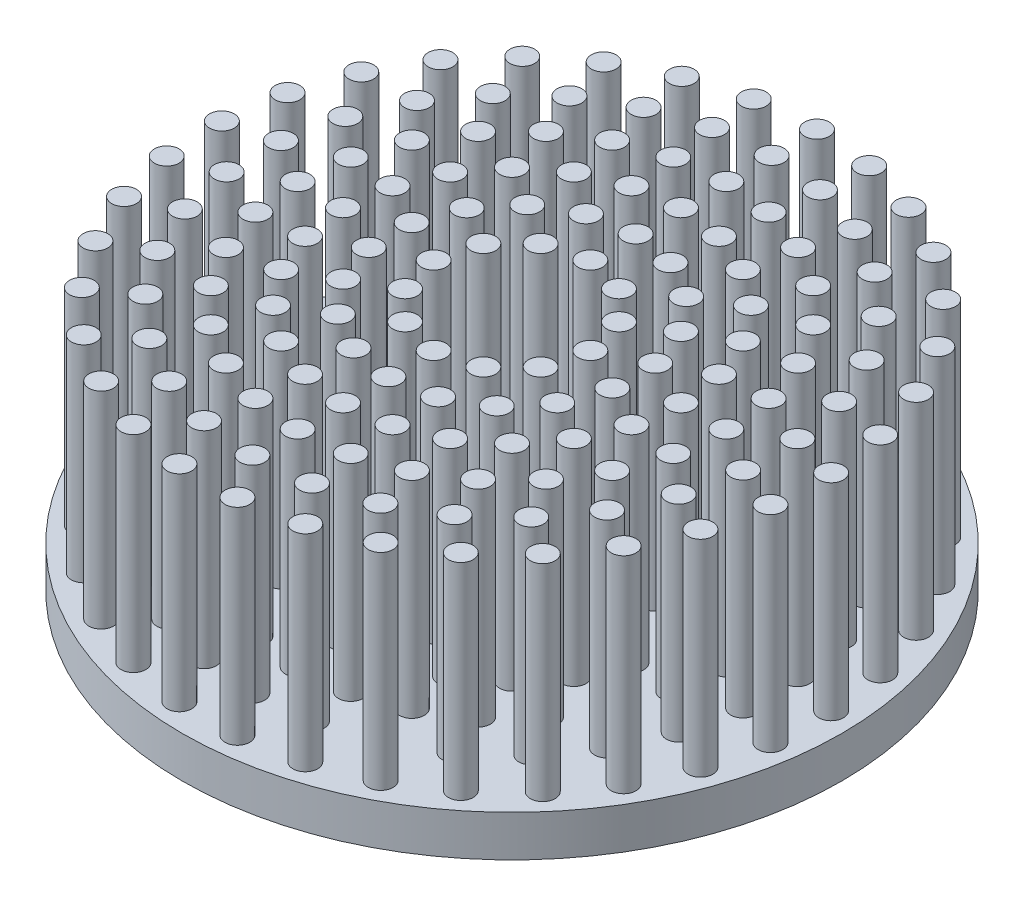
SolidWorks part; units mm, degrees
ref_plane "前基準面" through (0, 0, 0) normal (0, 0, 1) x (1, 0, 0)
ref_plane "上基準面" through (0, 0, 0) normal (0, 1, 0) x (1, 0, 0)
ref_plane "右基準面" through (0, 0, 0) normal (1, 0, 0) x (0, 0, -1)
sketch "草圖1" plane through (0, 0, 0) normal (0, 1, 0) x (1, 0, 0)
  circle A0 centre (0, 0) radius 40
  dimension "D1" = 80
extrude "填料-伸長1" add sketch "草圖1" along normal blind 3
sketch "草圖2" plane through (0, 3, 0) normal (0, 1, 0) x (1, 0, 0)
  line L0 (0, 0) -> (0, 50000) construction
  circle A68 centre (0, 0) radius 1.5
  dimension "D1" = 3
  dimension "D3" = 4
  dimension "D2" = 5
extrude "填料-伸長2" add sketch "草圖2" along normal blind 27
sketch "草圖6" plane through (0, 3, 0) normal (0, 1, 0) x (1, 0, 0)
  circle A0 centre (0, 5.5) radius 1.5
  circle A2 centre (0, 0) radius 1.5 construction
  circle A3 centre (0, 0) radius 1.5 construction
  dimension "D1" = 2.5
extrude "填料-伸長4" add sketch "草圖6" along normal up to surface (27 mm away)
pattern_circular "環狀複製排列3" count 6 over 360 about axis through (0, 0, 0) along (0, 1, 0) of "填料-伸長4"
sketch "草圖7" plane through (0, 3, 0) normal (0, 1, 0) x (1, 0, 0)
  circle A0 centre (0, 9.5) radius 1.5
  circle A1 centre (0, 5.5) radius 1.5 construction
  dimension "D1" = 1
extrude "填料-伸長5" add sketch "草圖7" along normal up to surface (27 mm away)
pattern_circular "環狀複製排列4" count 12 over 360 about axis through (0, 0, 0) along (0, 1, 0) of "填料-伸長5"
sketch "草圖8" plane through (0, 3, 0) normal (0, 1, 0) x (1, 0, 0)
  circle A0 centre (0, 15) radius 1.5
  circle A1 centre (0, 9.5) radius 1.5 construction
  circle A2 centre (0, 9.5) radius 1.5 construction
  dimension "D1" = 2.5
extrude "填料-伸長6" add sketch "草圖8" along normal up to surface (27 mm away)
pattern_circular "環狀複製排列5" count 18 over 360 about axis through (0, 0, 0) along (0, 1, 0) of "填料-伸長6"
sketch "草圖10" plane through (0, 3, 0) normal (0, 1, 0) x (1, 0, 0)
  circle A0 centre (0, 20.5) radius 1.5
  circle A1 centre (0, 15) radius 1.5 construction
  dimension "D1" = 2.5
extrude "填料-伸長7" add sketch "草圖10" along normal up to surface (27 mm away)
pattern_circular "環狀複製排列6" count 24 over 360 about axis through (0, 0, 0) along (0, 1, 0) of "填料-伸長7"
sketch "草圖11" plane through (0, 3, 0) normal (0, 1, 0) x (1, 0, 0)
  circle A0 centre (0, 26) radius 1.5
  circle A1 centre (0, 20.5) radius 1.5 construction
  dimension "D1" = 2.5
extrude "填料-伸長8" add sketch "草圖11" along normal up to surface (27 mm away)
pattern_circular "環狀複製排列7" count 28 over 360 about axis through (0, 0, 0) along (0, 1, 0) of "填料-伸長8"
sketch "草圖13" plane through (0, 3, 0) normal (0, 1, 0) x (1, 0, 0)
  circle A0 centre (0, 0) radius 7
  circle A1 centre (4.7631, -2.75) radius 1.5 construction
extrude "除料-伸長3" cut sketch "草圖13" along normal up to surface (27 mm away)
sketch "草圖15" plane through (0, 3, 0) normal (0, 1, 0) x (1, 0, 0)
  circle A0 centre (0, 0) radius 5.75 construction
  circle A1 centre (0, 4) radius 1.5
  circle A2 centre (0, 9.5) radius 1.5 construction
  circle A4 centre (0, 9.5) radius 1.5 construction
  dimension "D1" = 11.5
  dimension "D2" = 2.5
extrude "填料-伸長10" add sketch "草圖15" along normal up to surface (27 mm away)
pattern_circular "環狀複製排列8" count 5 over 360 about axis through (0, 0, 0) along (0, 1, 0) of "填料-伸長10"
sketch "草圖16" plane through (0, 3, 0) normal (0, 1, 0) x (1, 0, 0)
  circle A0 centre (-5.3058, 19.8015) radius 1.5 construction
  circle A1 centre (20.3276, 16.2107) radius 1.5
  circle A2 centre (20.3276, 16.2107) radius 1.5
  circle A3 centre (11.281, -23.4252) radius 1.5
  circle A4 centre (11.281, -23.4252) radius 1.5
  circle A5 centre (0, -20.5) radius 1.5
  circle A6 centre (0, -20.5) radius 1.5
  circle A7 centre (-5.7855, -25.3481) radius 1.5
  circle A8 centre (-5.7855, -25.3481) radius 1.5
  circle A9 centre (-10.25, -17.7535) radius 1.5
  circle A10 centre (-10.25, -17.7535) radius 1.5
  circle A11 centre (-25.3481, -5.7855) radius 1.5
  circle A12 centre (-25.3481, -5.7855) radius 1.5
  circle A13 centre (9.6418, 11.4907) radius 1.5
  circle A14 centre (9.6418, 11.4907) radius 1.5
  circle A15 centre (12.9904, 7.5) radius 1.5
  circle A16 centre (12.9904, 7.5) radius 1.5
  circle A17 centre (2.3511, -3.2361) radius 1.5
  circle A18 centre (2.3511, -3.2361) radius 1.5
  circle A19 centre (0, 4) radius 1.5
  circle A20 centre (0, 4) radius 1.5
  circle A21 centre (-12.9904, -7.5) radius 1.5
  circle A22 centre (-12.9904, -7.5) radius 1.5
  circle A23 centre (0, 26) radius 1.5 construction
  circle A24 centre (0, 20.5) radius 1.5 construction
  circle A25 centre (5.7855, 25.3481) radius 1.5 construction
  circle A26 centre (5.3058, 19.8015) radius 1.5 construction
  circle A27 centre (16.2107, 20.3276) radius 1.5 construction
  circle A28 centre (14.4957, 14.4957) radius 1.5 construction
  circle A29 centre (23.4252, 11.281) radius 1.5 construction
  circle A30 centre (25.3481, 5.7855) radius 1.5 construction
  circle A31 centre (19.8015, 5.3058) radius 1.5 construction
  circle A32 centre (20.5, 0) radius 1.5 construction
  circle A33 centre (26, 0) radius 1.5 construction
  circle A34 centre (25.3481, -5.7855) radius 1.5 construction
  circle A35 centre (19.8015, -5.3058) radius 1.5 construction
  circle A36 centre (23.4252, -11.281) radius 1.5 construction
  circle A37 centre (20.3276, -16.2107) radius 1.5 construction
  circle A38 centre (14.4957, -14.4957) radius 1.5 construction
  circle A39 centre (10.25, -17.7535) radius 1.5 construction
  circle A40 centre (5.3058, -19.8015) radius 1.5 construction
  circle A41 centre (-5.3058, -19.8015) radius 1.5 construction
  circle A42 centre (-14.4957, -14.4957) radius 1.5 construction
  circle A43 centre (-23.4252, -11.281) radius 1.5 construction
  circle A44 centre (-17.7535, -10.25) radius 1.5 construction
  circle A45 centre (-19.8015, -5.3058) radius 1.5 construction
  circle A46 centre (-26, 0) radius 1.5 construction
  circle A47 centre (-20.5, 0) radius 1.5 construction
  circle A48 centre (-19.8015, 5.3058) radius 1.5 construction
  circle A49 centre (-17.7535, 10.25) radius 1.5 construction
  circle A50 centre (-14.4957, 14.4957) radius 1.5 construction
  circle A51 centre (-20.3276, 16.2107) radius 1.5 construction
  circle A52 centre (-16.2107, 20.3276) radius 1.5 construction
  circle A53 centre (-11.281, 23.4252) radius 1.5 construction
  circle A54 centre (-5.1303, 14.0954) radius 1.5 construction
  circle A55 centre (0, 15) radius 1.5 construction
  circle A56 centre (5.1303, 14.0954) radius 1.5 construction
  circle A57 centre (14.7721, 2.6047) radius 1.5 construction
  circle A58 centre (9.6418, -11.4907) radius 1.5 construction
  circle A59 centre (0, -15) radius 1.5 construction
  circle A60 centre (5.1303, -14.0954) radius 1.5 construction
  circle A61 centre (4.75, -8.2272) radius 1.5 construction
  circle A62 centre (0, -9.5) radius 1.5 construction
  circle A63 centre (-2.3511, -3.2361) radius 1.5 construction
  circle A64 centre (0, 9.5) radius 1.5 construction
  circle A65 centre (-4.75, 8.2272) radius 1.5 construction
  circle A66 centre (-9.6418, 11.4907) radius 1.5 construction
  circle A67 centre (-12.9904, 7.5) radius 1.5 construction
  circle A68 centre (-8.2272, 4.75) radius 1.5 construction
  circle A69 centre (-9.5, 0) radius 1.5 construction
  circle A70 centre (-14.7721, -2.6047) radius 1.5 construction
  circle A71 centre (-14.7721, 2.6047) radius 1.5 construction
  circle A72 centre (-8.2272, -4.75) radius 1.5 construction
  circle A73 centre (-4.75, -8.2272) radius 1.5 construction
  circle A74 centre (-5.1303, -14.0954) radius 1.5 construction
  circle A75 centre (4.75, 8.2272) radius 1.5 construction
  circle A76 centre (8.2272, 4.75) radius 1.5 construction
  circle A77 centre (9.5, 0) radius 1.5 construction
  circle A78 centre (8.2272, -4.75) radius 1.5 construction
  circle A79 centre (-5.7855, 25.3481) radius 1.5 construction
  circle A80 centre (11.281, 23.4252) radius 1.5 construction
  circle A81 centre (10.25, 17.7535) radius 1.5 construction
  circle A82 centre (17.7535, 10.25) radius 1.5 construction
  circle A83 centre (17.7535, -10.25) radius 1.5 construction
  circle A84 centre (16.2107, -20.3276) radius 1.5 construction
  circle A85 centre (5.7855, -25.3481) radius 1.5 construction
  circle A86 centre (0, -26) radius 1.5 construction
  circle A87 centre (-11.281, -23.4252) radius 1.5 construction
  circle A88 centre (-16.2107, -20.3276) radius 1.5 construction
  circle A89 centre (-20.3276, -16.2107) radius 1.5 construction
  circle A90 centre (-25.3481, 5.7855) radius 1.5 construction
  circle A91 centre (-23.4252, 11.281) radius 1.5 construction
  circle A92 centre (-10.25, 17.7535) radius 1.5 construction
  circle A93 centre (14.7721, -2.6047) radius 1.5 construction
  circle A94 centre (12.9904, -7.5) radius 1.5 construction
  circle A95 centre (3.8042, 1.2361) radius 1.5 construction
  circle A96 centre (-9.6418, -11.4907) radius 1.5 construction
  circle A97 centre (-3.8042, 1.2361) radius 1.5 construction
  circle A98 centre (-5.3058, 19.8015) radius 1.5
  circle A99 centre (0, 26) radius 1.5
  circle A100 centre (0, 20.5) radius 1.5
  circle A101 centre (5.7855, 25.3481) radius 1.5
  circle A102 centre (5.3058, 19.8015) radius 1.5
  circle A103 centre (16.2107, 20.3276) radius 1.5
  circle A104 centre (14.4957, 14.4957) radius 1.5
  circle A105 centre (23.4252, 11.281) radius 1.5
  circle A106 centre (25.3481, 5.7855) radius 1.5
  circle A107 centre (19.8015, 5.3058) radius 1.5
  circle A108 centre (20.5, 0) radius 1.5
  circle A109 centre (26, 0) radius 1.5
  circle A110 centre (25.3481, -5.7855) radius 1.5
  circle A111 centre (19.8015, -5.3058) radius 1.5
  circle A112 centre (23.4252, -11.281) radius 1.5
  circle A113 centre (20.3276, -16.2107) radius 1.5
  circle A114 centre (14.4957, -14.4957) radius 1.5
  circle A115 centre (10.25, -17.7535) radius 1.5
  circle A116 centre (5.3058, -19.8015) radius 1.5
  circle A117 centre (-5.3058, -19.8015) radius 1.5
  circle A118 centre (-14.4957, -14.4957) radius 1.5
  circle A119 centre (-23.4252, -11.281) radius 1.5
  circle A120 centre (-17.7535, -10.25) radius 1.5
  circle A121 centre (-19.8015, -5.3058) radius 1.5
  circle A122 centre (-26, 0) radius 1.5
  circle A123 centre (-20.5, 0) radius 1.5
  circle A124 centre (-19.8015, 5.3058) radius 1.5
  circle A125 centre (-17.7535, 10.25) radius 1.5
  circle A126 centre (-14.4957, 14.4957) radius 1.5
  circle A127 centre (-20.3276, 16.2107) radius 1.5
  circle A128 centre (-16.2107, 20.3276) radius 1.5
  circle A129 centre (-11.281, 23.4252) radius 1.5
  circle A130 centre (-5.1303, 14.0954) radius 1.5
  circle A131 centre (0, 15) radius 1.5
  circle A132 centre (5.1303, 14.0954) radius 1.5
  circle A133 centre (14.7721, 2.6047) radius 1.5
  circle A134 centre (9.6418, -11.4907) radius 1.5
  circle A135 centre (0, -15) radius 1.5
  circle A136 centre (5.1303, -14.0954) radius 1.5
  circle A137 centre (4.75, -8.2272) radius 1.5
  circle A138 centre (0, -9.5) radius 1.5
  circle A139 centre (-2.3511, -3.2361) radius 1.5
  circle A140 centre (0, 9.5) radius 1.5
  circle A141 centre (-4.75, 8.2272) radius 1.5
  circle A142 centre (-9.6418, 11.4907) radius 1.5
  circle A143 centre (-12.9904, 7.5) radius 1.5
  circle A144 centre (-8.2272, 4.75) radius 1.5
  circle A145 centre (-9.5, 0) radius 1.5
  circle A146 centre (-14.7721, -2.6047) radius 1.5
  circle A147 centre (-14.7721, 2.6047) radius 1.5
  circle A148 centre (-8.2272, -4.75) radius 1.5
  circle A149 centre (-4.75, -8.2272) radius 1.5
  circle A150 centre (-5.1303, -14.0954) radius 1.5
  circle A151 centre (4.75, 8.2272) radius 1.5
  circle A152 centre (8.2272, 4.75) radius 1.5
  circle A153 centre (9.5, 0) radius 1.5
  circle A154 centre (8.2272, -4.75) radius 1.5
  circle A155 centre (-5.7855, 25.3481) radius 1.5
  circle A156 centre (11.281, 23.4252) radius 1.5
  circle A157 centre (10.25, 17.7535) radius 1.5
  circle A158 centre (17.7535, 10.25) radius 1.5
  circle A159 centre (17.7535, -10.25) radius 1.5
  circle A160 centre (16.2107, -20.3276) radius 1.5
  circle A161 centre (5.7855, -25.3481) radius 1.5
  circle A162 centre (0, -26) radius 1.5
  circle A163 centre (-11.281, -23.4252) radius 1.5
  circle A164 centre (-16.2107, -20.3276) radius 1.5
  circle A165 centre (-20.3276, -16.2107) radius 1.5
  circle A166 centre (-25.3481, 5.7855) radius 1.5
  circle A167 centre (-23.4252, 11.281) radius 1.5
  circle A168 centre (-10.25, 17.7535) radius 1.5
  circle A169 centre (14.7721, -2.6047) radius 1.5
  circle A170 centre (12.9904, -7.5) radius 1.5
  circle A171 centre (3.8042, 1.2361) radius 1.5
  circle A172 centre (-9.6418, -11.4907) radius 1.5
  circle A173 centre (-3.8042, 1.2361) radius 1.5
  dimension "D1" = 0
  dimension "D2" = 0
  dimension "D3" = 0
  dimension "D4" = 0
  dimension "D5" = 0
  dimension "D6" = 0
  dimension "D7" = 0
  dimension "D8" = 0
  dimension "D9" = 0
  dimension "D10" = 0
  dimension "D11" = 0
sketch "草圖23" plane through (0, 3, 0) normal (0, 1, 0) x (1, 0, 0)
  circle A0 centre (0, 31.5) radius 1.5
  circle A1 centre (0, 26) radius 1.5 construction
  dimension "D1" = 5.5
extrude "填料-伸長16" add sketch "草圖23" along normal up to surface (27 mm away)
pattern_circular "環狀複製排列9" count 30 over 360 about axis through (0, 0, 0) along (0, 1, 0) of "填料-伸長16"
sketch "草圖26" plane through (0, 3, 0) normal (0, 1, 0) x (1, 0, 0)
  circle A0 centre (0, 37) radius 1.5
  circle A1 centre (0, 31.5) radius 1.5 construction
  circle A2 centre (0, 31.5) radius 1.5 construction
  dimension "D1" = 5.5
extrude "填料-伸長17" add sketch "草圖26" along normal up to surface (27 mm away)
pattern_circular "環狀複製排列10" count 33 over 360 about axis through (0, 0, 0) along (0, 1, 0) of "填料-伸長17"
sketch "草圖25" plane through (0, 3, 0) normal (0, 1, 0) x (1, 0, 0)
  circle A0 centre (0, 31.5) radius 1.5 construction
  circle A1 centre (6.5492, 30.8116) radius 1.5 construction
  circle A2 centre (12.8122, 28.7767) radius 1.5 construction
  circle A3 centre (11.281, 23.4252) radius 1.5 construction
  circle A4 centre (18.5152, 25.484) radius 1.5 construction
  circle A5 centre (23.4091, 21.0776) radius 1.5 construction
  circle A6 centre (27.2798, 15.75) radius 1.5 construction
  circle A7 centre (25.3481, 5.7855) radius 1.5 construction
  circle A8 centre (17.7535, 10.25) radius 1.5 construction
  circle A9 centre (0, 15) radius 1.5 construction
  circle A10 centre (0, 20.5) radius 1.5 construction
  circle A11 centre (-5.3058, 19.8015) radius 1.5 construction
  circle A12 centre (-5.7855, 25.3481) radius 1.5 construction
  circle A13 centre (-11.281, 23.4252) radius 1.5 construction
  circle A14 centre (-16.2107, 20.3276) radius 1.5 construction
  circle A15 centre (-23.4091, 21.0776) radius 1.5 construction
  circle A16 centre (-20.3276, 16.2107) radius 1.5 construction
  circle A17 centre (-27.2798, 15.75) radius 1.5 construction
  circle A18 centre (-25.3481, 5.7855) radius 1.5 construction
  circle A19 centre (-29.9583, 9.734) radius 1.5 construction
  circle A20 centre (-31.3274, 3.2926) radius 1.5 construction
  circle A21 centre (-31.3274, -3.2926) radius 1.5 construction
  circle A22 centre (-25.3481, -5.7855) radius 1.5 construction
  circle A23 centre (-27.2798, -15.75) radius 1.5 construction
  circle A24 centre (-20.3276, -16.2107) radius 1.5 construction
  circle A25 centre (-11.281, -23.4252) radius 1.5 construction
  circle A26 centre (-5.7855, -25.3481) radius 1.5 construction
  circle A27 centre (0, -26) radius 1.5 construction
  circle A28 centre (11.281, -23.4252) radius 1.5 construction
  circle A29 centre (18.5152, -25.484) radius 1.5 construction
  circle A30 centre (16.2107, -20.3276) radius 1.5 construction
  circle A31 centre (23.4091, -21.0776) radius 1.5 construction
  circle A32 centre (20.3276, -16.2107) radius 1.5 construction
  circle A33 centre (27.2798, -15.75) radius 1.5 construction
  circle A34 centre (29.9583, -9.734) radius 1.5 construction
  circle A35 centre (31.3274, 3.2926) radius 1.5 construction
  circle A36 centre (31.3274, -3.2926) radius 1.5 construction
  circle A37 centre (26, 0) radius 1.5 construction
  circle A38 centre (19.8015, -5.3058) radius 1.5 construction
  circle A39 centre (3.8042, 1.2361) radius 1.5 construction
  circle A40 centre (8.2272, 4.75) radius 1.5 construction
  circle A41 centre (14.7721, 2.6047) radius 1.5 construction
  circle A42 centre (12.9904, 7.5) radius 1.5 construction
  circle A43 centre (9.6418, 11.4907) radius 1.5 construction
  circle A44 centre (-4.75, 8.2272) radius 1.5 construction
  circle A45 centre (-10.25, 17.7535) radius 1.5 construction
  circle A46 centre (-14.4957, 14.4957) radius 1.5 construction
  circle A47 centre (-9.6418, 11.4907) radius 1.5 construction
  circle A48 centre (-12.9904, 7.5) radius 1.5 construction
  circle A49 centre (-17.7535, 10.25) radius 1.5 construction
  circle A50 centre (-19.8015, 5.3058) radius 1.5 construction
  circle A51 centre (-19.8015, -5.3058) radius 1.5 construction
  circle A52 centre (-14.7721, -2.6047) radius 1.5 construction
  circle A53 centre (-17.7535, -10.25) radius 1.5 construction
  circle A54 centre (-10.25, -17.7535) radius 1.5 construction
  circle A55 centre (-5.1303, -14.0954) radius 1.5 construction
  circle A56 centre (-4.75, -8.2272) radius 1.5 construction
  circle A57 centre (-8.2272, -4.75) radius 1.5 construction
  circle A58 centre (-9.5, 0) radius 1.5 construction
  circle A59 centre (-8.2272, 4.75) radius 1.5 construction
  circle A60 centre (0, 4) radius 1.5 construction
  circle A61 centre (2.3511, -3.2361) radius 1.5 construction
  circle A62 centre (8.2272, -4.75) radius 1.5 construction
  circle A63 centre (0, -9.5) radius 1.5 construction
  circle A64 centre (5.1303, -14.0954) radius 1.5 construction
  circle A65 centre (9.6418, -11.4907) radius 1.5 construction
  circle A66 centre (12.9904, -7.5) radius 1.5 construction
  circle A67 centre (-5.3058, -19.8015) radius 1.5 construction
  circle A68 centre (-6.5492, 30.8116) radius 1.5 construction
  circle A69 centre (0, 26) radius 1.5 construction
  circle A70 centre (5.7855, 25.3481) radius 1.5 construction
  circle A71 centre (16.2107, 20.3276) radius 1.5 construction
  circle A72 centre (20.3276, 16.2107) radius 1.5 construction
  circle A73 centre (23.4252, 11.281) radius 1.5 construction
  circle A74 centre (29.9583, 9.734) radius 1.5 construction
  circle A75 centre (19.8015, 5.3058) radius 1.5 construction
  circle A76 centre (14.4957, 14.4957) radius 1.5 construction
  circle A77 centre (10.25, 17.7535) radius 1.5 construction
  circle A78 centre (5.3058, 19.8015) radius 1.5 construction
  circle A79 centre (5.1303, 14.0954) radius 1.5 construction
  circle A80 centre (-12.8122, 28.7767) radius 1.5 construction
  circle A81 centre (-18.5152, 25.484) radius 1.5 construction
  circle A82 centre (-23.4252, 11.281) radius 1.5 construction
  circle A83 centre (-26, 0) radius 1.5 construction
  circle A84 centre (-29.9583, -9.734) radius 1.5 construction
  circle A85 centre (-23.4252, -11.281) radius 1.5 construction
  circle A86 centre (-23.4091, -21.0776) radius 1.5 construction
  circle A87 centre (-16.2107, -20.3276) radius 1.5 construction
  circle A88 centre (-18.5152, -25.484) radius 1.5 construction
  circle A89 centre (-12.8122, -28.7767) radius 1.5 construction
  circle A90 centre (-6.5492, -30.8116) radius 1.5 construction
  circle A91 centre (0, -31.5) radius 1.5 construction
  circle A92 centre (5.7855, -25.3481) radius 1.5 construction
  circle A93 centre (6.5492, -30.8116) radius 1.5 construction
  circle A94 centre (12.8122, -28.7767) radius 1.5 construction
  circle A95 centre (23.4252, -11.281) radius 1.5 construction
  circle A96 centre (25.3481, -5.7855) radius 1.5 construction
  circle A97 centre (20.5, 0) radius 1.5 construction
  circle A98 centre (14.7721, -2.6047) radius 1.5 construction
  circle A99 centre (9.5, 0) radius 1.5 construction
  circle A100 centre (4.75, 8.2272) radius 1.5 construction
  circle A101 centre (0, 9.5) radius 1.5 construction
  circle A102 centre (-5.1303, 14.0954) radius 1.5 construction
  circle A103 centre (-14.7721, 2.6047) radius 1.5 construction
  circle A104 centre (-20.5, 0) radius 1.5 construction
  circle A105 centre (-12.9904, -7.5) radius 1.5 construction
  circle A106 centre (-9.6418, -11.4907) radius 1.5 construction
  circle A107 centre (-14.4957, -14.4957) radius 1.5 construction
  circle A108 centre (-3.8042, 1.2361) radius 1.5 construction
  circle A109 centre (-2.3511, -3.2361) radius 1.5 construction
  circle A110 centre (4.75, -8.2272) radius 1.5 construction
  circle A111 centre (0, -15) radius 1.5 construction
  circle A112 centre (17.7535, -10.25) radius 1.5 construction
  circle A113 centre (14.4957, -14.4957) radius 1.5 construction
  circle A114 centre (10.25, -17.7535) radius 1.5 construction
  circle A115 centre (5.3058, -19.8015) radius 1.5 construction
  circle A116 centre (0, -20.5) radius 1.5 construction
  circle A117 centre (0, 31.5) radius 1.5
  circle A118 centre (6.5492, 30.8116) radius 1.5
  circle A119 centre (12.8122, 28.7767) radius 1.5
  circle A120 centre (11.281, 23.4252) radius 1.5
  circle A121 centre (18.5152, 25.484) radius 1.5
  circle A122 centre (23.4091, 21.0776) radius 1.5
  circle A123 centre (27.2798, 15.75) radius 1.5
  circle A124 centre (25.3481, 5.7855) radius 1.5
  circle A125 centre (17.7535, 10.25) radius 1.5
  circle A126 centre (0, 15) radius 1.5
  circle A127 centre (0, 20.5) radius 1.5
  circle A128 centre (-5.3058, 19.8015) radius 1.5
  circle A129 centre (-5.7855, 25.3481) radius 1.5
  circle A130 centre (-11.281, 23.4252) radius 1.5
  circle A131 centre (-16.2107, 20.3276) radius 1.5
  circle A132 centre (-23.4091, 21.0776) radius 1.5
  circle A133 centre (-20.3276, 16.2107) radius 1.5
  circle A134 centre (-27.2798, 15.75) radius 1.5
  circle A135 centre (-25.3481, 5.7855) radius 1.5
  circle A136 centre (-29.9583, 9.734) radius 1.5
  circle A137 centre (-31.3274, 3.2926) radius 1.5
  circle A138 centre (-31.3274, -3.2926) radius 1.5
  circle A139 centre (-25.3481, -5.7855) radius 1.5
  circle A140 centre (-27.2798, -15.75) radius 1.5
  circle A141 centre (-20.3276, -16.2107) radius 1.5
  circle A142 centre (-11.281, -23.4252) radius 1.5
  circle A143 centre (-5.7855, -25.3481) radius 1.5
  circle A144 centre (0, -26) radius 1.5
  circle A145 centre (11.281, -23.4252) radius 1.5
  circle A146 centre (18.5152, -25.484) radius 1.5
  circle A147 centre (16.2107, -20.3276) radius 1.5
  circle A148 centre (23.4091, -21.0776) radius 1.5
  circle A149 centre (20.3276, -16.2107) radius 1.5
  circle A150 centre (27.2798, -15.75) radius 1.5
  circle A151 centre (29.9583, -9.734) radius 1.5
  circle A152 centre (31.3274, 3.2926) radius 1.5
  circle A153 centre (31.3274, -3.2926) radius 1.5
  circle A154 centre (26, 0) radius 1.5
  circle A155 centre (19.8015, -5.3058) radius 1.5
  circle A156 centre (3.8042, 1.2361) radius 1.5
  circle A157 centre (8.2272, 4.75) radius 1.5
  circle A158 centre (14.7721, 2.6047) radius 1.5
  circle A159 centre (12.9904, 7.5) radius 1.5
  circle A160 centre (9.6418, 11.4907) radius 1.5
  circle A161 centre (-4.75, 8.2272) radius 1.5
  circle A162 centre (-10.25, 17.7535) radius 1.5
  circle A163 centre (-14.4957, 14.4957) radius 1.5
  circle A164 centre (-9.6418, 11.4907) radius 1.5
  circle A165 centre (-12.9904, 7.5) radius 1.5
  circle A166 centre (-17.7535, 10.25) radius 1.5
  circle A167 centre (-19.8015, 5.3058) radius 1.5
  circle A168 centre (-19.8015, -5.3058) radius 1.5
  circle A169 centre (-14.7721, -2.6047) radius 1.5
  circle A170 centre (-17.7535, -10.25) radius 1.5
  circle A171 centre (-10.25, -17.7535) radius 1.5
  circle A172 centre (-5.1303, -14.0954) radius 1.5
  circle A173 centre (-4.75, -8.2272) radius 1.5
  circle A174 centre (-8.2272, -4.75) radius 1.5
  circle A175 centre (-9.5, 0) radius 1.5
  circle A176 centre (-8.2272, 4.75) radius 1.5
  circle A177 centre (0, 4) radius 1.5
  circle A178 centre (2.3511, -3.2361) radius 1.5
  circle A179 centre (8.2272, -4.75) radius 1.5
  circle A180 centre (0, -9.5) radius 1.5
  circle A181 centre (5.1303, -14.0954) radius 1.5
  circle A182 centre (9.6418, -11.4907) radius 1.5
  circle A183 centre (12.9904, -7.5) radius 1.5
  circle A184 centre (-5.3058, -19.8015) radius 1.5
  circle A185 centre (-6.5492, 30.8116) radius 1.5
  circle A186 centre (0, 26) radius 1.5
  circle A187 centre (5.7855, 25.3481) radius 1.5
  circle A188 centre (16.2107, 20.3276) radius 1.5
  circle A189 centre (20.3276, 16.2107) radius 1.5
  circle A190 centre (23.4252, 11.281) radius 1.5
  circle A191 centre (29.9583, 9.734) radius 1.5
  circle A192 centre (19.8015, 5.3058) radius 1.5
  circle A193 centre (14.4957, 14.4957) radius 1.5
  circle A194 centre (10.25, 17.7535) radius 1.5
  circle A195 centre (5.3058, 19.8015) radius 1.5
  circle A196 centre (5.1303, 14.0954) radius 1.5
  circle A197 centre (-12.8122, 28.7767) radius 1.5
  circle A198 centre (-18.5152, 25.484) radius 1.5
  circle A199 centre (-23.4252, 11.281) radius 1.5
  circle A200 centre (-26, 0) radius 1.5
  circle A201 centre (-29.9583, -9.734) radius 1.5
  circle A202 centre (-23.4252, -11.281) radius 1.5
  circle A203 centre (-23.4091, -21.0776) radius 1.5
  circle A204 centre (-16.2107, -20.3276) radius 1.5
  circle A205 centre (-18.5152, -25.484) radius 1.5
  circle A206 centre (-12.8122, -28.7767) radius 1.5
  circle A207 centre (-6.5492, -30.8116) radius 1.5
  circle A208 centre (0, -31.5) radius 1.5
  circle A209 centre (5.7855, -25.3481) radius 1.5
  circle A210 centre (6.5492, -30.8116) radius 1.5
  circle A211 centre (12.8122, -28.7767) radius 1.5
  circle A212 centre (23.4252, -11.281) radius 1.5
  circle A213 centre (25.3481, -5.7855) radius 1.5
  circle A214 centre (20.5, 0) radius 1.5
  circle A215 centre (14.7721, -2.6047) radius 1.5
  circle A216 centre (9.5, 0) radius 1.5
  circle A217 centre (4.75, 8.2272) radius 1.5
  circle A218 centre (0, 9.5) radius 1.5
  circle A219 centre (-5.1303, 14.0954) radius 1.5
  circle A220 centre (-14.7721, 2.6047) radius 1.5
  circle A221 centre (-20.5, 0) radius 1.5
  circle A222 centre (-12.9904, -7.5) radius 1.5
  circle A223 centre (-9.6418, -11.4907) radius 1.5
  circle A224 centre (-14.4957, -14.4957) radius 1.5
  circle A225 centre (-3.8042, 1.2361) radius 1.5
  circle A226 centre (-2.3511, -3.2361) radius 1.5
  circle A227 centre (4.75, -8.2272) radius 1.5
  circle A228 centre (0, -15) radius 1.5
  circle A229 centre (17.7535, -10.25) radius 1.5
  circle A230 centre (14.4957, -14.4957) radius 1.5
  circle A231 centre (10.25, -17.7535) radius 1.5
  circle A232 centre (5.3058, -19.8015) radius 1.5
  circle A233 centre (0, -20.5) radius 1.5
  circle A234 centre (-20.0037, 31.1264) radius 1.5 construction
  circle A235 centre (0, 37) radius 1.5 construction
  circle A236 centre (7.0023, 36.3314) radius 1.5 construction
  circle A237 centre (13.7515, 34.3496) radius 1.5 construction
  circle A238 centre (20.0037, 31.1264) radius 1.5 construction
  circle A239 centre (36.6234, -5.2656) radius 1.5 construction
  circle A240 centre (22.8719, -29.084) radius 1.5 construction
  circle A241 centre (-3.5171, -36.8325) radius 1.5 construction
  circle A242 centre (-10.4241, -35.5012) radius 1.5 construction
  circle A243 centre (-22.8719, -29.084) radius 1.5 construction
  circle A244 centre (-36.9581, 1.7605) radius 1.5 construction
  circle A245 centre (-35.957, 8.7231) radius 1.5 construction
  circle A246 centre (-33.6564, 15.3704) radius 1.5 construction
  circle A247 centre (-30.1393, 21.4621) radius 1.5 construction
  circle A248 centre (-25.5329, 26.7782) radius 1.5 construction
  circle A249 centre (-13.7515, 34.3496) radius 1.5 construction
  circle A250 centre (-7.0023, 36.3314) radius 1.5 construction
  circle A251 centre (25.5329, 26.7782) radius 1.5 construction
  circle A252 centre (30.1393, 21.4621) radius 1.5 construction
  circle A253 centre (33.6564, 15.3704) radius 1.5 construction
  circle A254 centre (35.957, 8.7231) radius 1.5 construction
  circle A255 centre (36.9581, 1.7605) radius 1.5 construction
  circle A256 centre (34.965, -12.1015) radius 1.5 construction
  circle A257 centre (32.0429, -18.5) radius 1.5 construction
  circle A258 centre (27.9627, -24.2298) radius 1.5 construction
  circle A259 centre (16.9544, -32.8869) radius 1.5 construction
  circle A260 centre (10.4241, -35.5012) radius 1.5 construction
  circle A261 centre (3.5171, -36.8325) radius 1.5 construction
  circle A262 centre (-16.9544, -32.8869) radius 1.5 construction
  circle A263 centre (-27.9627, -24.2298) radius 1.5 construction
  circle A264 centre (-32.0429, -18.5) radius 1.5 construction
  circle A265 centre (-34.965, -12.1015) radius 1.5 construction
  circle A266 centre (-36.6234, -5.2656) radius 1.5 construction
  circle A267 centre (-20.0037, 31.1264) radius 1.5
  circle A268 centre (0, 37) radius 1.5
  circle A269 centre (7.0023, 36.3314) radius 1.5
  circle A270 centre (13.7515, 34.3496) radius 1.5
  circle A271 centre (20.0037, 31.1264) radius 1.5
  circle A272 centre (36.6234, -5.2656) radius 1.5
  circle A273 centre (22.8719, -29.084) radius 1.5
  circle A274 centre (-3.5171, -36.8325) radius 1.5
  circle A275 centre (-10.4241, -35.5012) radius 1.5
  circle A276 centre (-22.8719, -29.084) radius 1.5
  circle A277 centre (-36.9581, 1.7605) radius 1.5
  circle A278 centre (-35.957, 8.7231) radius 1.5
  circle A279 centre (-33.6564, 15.3704) radius 1.5
  circle A280 centre (-30.1393, 21.4621) radius 1.5
  circle A281 centre (-25.5329, 26.7782) radius 1.5
  circle A282 centre (-13.7515, 34.3496) radius 1.5
  circle A283 centre (-7.0023, 36.3314) radius 1.5
  circle A284 centre (25.5329, 26.7782) radius 1.5
  circle A285 centre (30.1393, 21.4621) radius 1.5
  circle A286 centre (33.6564, 15.3704) radius 1.5
  circle A287 centre (35.957, 8.7231) radius 1.5
  circle A288 centre (36.9581, 1.7605) radius 1.5
  circle A289 centre (34.965, -12.1015) radius 1.5
  circle A290 centre (32.0429, -18.5) radius 1.5
  circle A291 centre (27.9627, -24.2298) radius 1.5
  circle A292 centre (16.9544, -32.8869) radius 1.5
  circle A293 centre (10.4241, -35.5012) radius 1.5
  circle A294 centre (3.5171, -36.8325) radius 1.5
  circle A295 centre (-16.9544, -32.8869) radius 1.5
  circle A296 centre (-27.9627, -24.2298) radius 1.5
  circle A297 centre (-32.0429, -18.5) radius 1.5
  circle A298 centre (-34.965, -12.1015) radius 1.5
  circle A299 centre (-36.6234, -5.2656) radius 1.5
sketch "草圖28" [suppressed] plane through (0, 3, 0) normal (0, 1, 0) x (1, 0, 0)
  circle A1 centre (0, 0) radius 40
  circle A2 centre (0, 0) radius 40
  dimension "D1" = 0
extrude "填料-伸長18" [suppressed] add sketch "草圖28" along normal blind 2
sketch "草圖29" plane through (0, 3, 0) normal (0, 1, 0) x (1, 0, 0)
  circle A1 centre (-17.7535, -10.25) radius 1.5
  circle A2 centre (-17.7535, -10.25) radius 1.5
  circle A3 centre (-14.7721, -2.6047) radius 1.5
  circle A4 centre (-14.7721, -2.6047) radius 1.5
  circle A5 centre (-19.8015, -5.3058) radius 1.5
  circle A6 centre (-19.8015, -5.3058) radius 1.5
  circle A7 centre (-19.8015, 5.3058) radius 1.5
  circle A8 centre (-19.8015, 5.3058) radius 1.5
  circle A9 centre (-17.7535, 10.25) radius 1.5
  circle A10 centre (-17.7535, 10.25) radius 1.5
  circle A11 centre (-12.9904, 7.5) radius 1.5
  circle A12 centre (-12.9904, 7.5) radius 1.5
  circle A13 centre (-9.6418, 11.4907) radius 1.5
  circle A14 centre (-9.6418, 11.4907) radius 1.5
  circle A15 centre (-14.4957, 14.4957) radius 1.5
  circle A16 centre (-14.4957, 14.4957) radius 1.5
  circle A17 centre (-10.25, 17.7535) radius 1.5
  circle A18 centre (-10.25, 17.7535) radius 1.5
  circle A19 centre (-4.75, 8.2272) radius 1.5
  circle A20 centre (-4.75, 8.2272) radius 1.5
  circle A21 centre (9.6418, 11.4907) radius 1.5
  circle A22 centre (9.6418, 11.4907) radius 1.5
  circle A23 centre (12.9904, 7.5) radius 1.5
  circle A24 centre (12.9904, 7.5) radius 1.5
  circle A25 centre (14.7721, 2.6047) radius 1.5
  circle A26 centre (14.7721, 2.6047) radius 1.5
  circle A27 centre (8.2272, 4.75) radius 1.5
  circle A28 centre (8.2272, 4.75) radius 1.5
  circle A29 centre (3.8042, 1.2361) radius 1.5
  circle A30 centre (3.8042, 1.2361) radius 1.5
  circle A31 centre (19.8015, -5.3058) radius 1.5
  circle A32 centre (19.8015, -5.3058) radius 1.5
  circle A33 centre (0, 26) radius 1.5
  circle A34 centre (0, 26) radius 1.5
  circle A35 centre (-6.5492, 30.8116) radius 1.5
  circle A36 centre (-6.5492, 30.8116) radius 1.5
  circle A37 centre (-5.3058, -19.8015) radius 1.5
  circle A38 centre (-5.3058, -19.8015) radius 1.5
  circle A39 centre (12.9904, -7.5) radius 1.5
  circle A40 centre (12.9904, -7.5) radius 1.5
  circle A41 centre (9.6418, -11.4907) radius 1.5
  circle A42 centre (9.6418, -11.4907) radius 1.5
  circle A43 centre (5.1303, -14.0954) radius 1.5
  circle A44 centre (5.1303, -14.0954) radius 1.5
  circle A45 centre (0, -9.5) radius 1.5
  circle A46 centre (0, -9.5) radius 1.5
  circle A47 centre (8.2272, -4.75) radius 1.5
  circle A48 centre (8.2272, -4.75) radius 1.5
  circle A49 centre (2.3511, -3.2361) radius 1.5
  circle A50 centre (2.3511, -3.2361) radius 1.5
  circle A51 centre (0, 4) radius 1.5
  circle A52 centre (0, 4) radius 1.5
  circle A53 centre (-8.2272, 4.75) radius 1.5
  circle A54 centre (-8.2272, 4.75) radius 1.5
  circle A55 centre (-9.5, 0) radius 1.5
  circle A56 centre (-9.5, 0) radius 1.5
  circle A57 centre (-8.2272, -4.75) radius 1.5
  circle A58 centre (-8.2272, -4.75) radius 1.5
  circle A59 centre (-4.75, -8.2272) radius 1.5
  circle A60 centre (-4.75, -8.2272) radius 1.5
  circle A61 centre (-5.1303, -14.0954) radius 1.5
  circle A62 centre (-5.1303, -14.0954) radius 1.5
  circle A63 centre (-10.25, -17.7535) radius 1.5
  circle A64 centre (-10.25, -17.7535) radius 1.5
  circle A65 centre (-23.4252, -11.281) radius 1.5
  circle A66 centre (-23.4252, -11.281) radius 1.5
  circle A67 centre (-29.9583, -9.734) radius 1.5
  circle A68 centre (-29.9583, -9.734) radius 1.5
  circle A69 centre (-26, 0) radius 1.5
  circle A70 centre (-26, 0) radius 1.5
  circle A71 centre (-23.4252, 11.281) radius 1.5
  circle A72 centre (-23.4252, 11.281) radius 1.5
  circle A73 centre (-18.5152, 25.484) radius 1.5
  circle A74 centre (-18.5152, 25.484) radius 1.5
  circle A75 centre (-12.8122, 28.7767) radius 1.5
  circle A76 centre (-12.8122, 28.7767) radius 1.5
  circle A77 centre (5.1303, 14.0954) radius 1.5
  circle A78 centre (5.1303, 14.0954) radius 1.5
  circle A79 centre (5.3058, 19.8015) radius 1.5
  circle A80 centre (5.3058, 19.8015) radius 1.5
  circle A81 centre (10.25, 17.7535) radius 1.5
  circle A82 centre (10.25, 17.7535) radius 1.5
  circle A83 centre (14.4957, 14.4957) radius 1.5
  circle A84 centre (14.4957, 14.4957) radius 1.5
  circle A85 centre (19.8015, 5.3058) radius 1.5
  circle A86 centre (19.8015, 5.3058) radius 1.5
  circle A87 centre (29.9583, 9.734) radius 1.5
  circle A88 centre (29.9583, 9.734) radius 1.5
  circle A89 centre (23.4252, 11.281) radius 1.5
  circle A90 centre (23.4252, 11.281) radius 1.5
  circle A91 centre (20.3276, 16.2107) radius 1.5
  circle A92 centre (20.3276, 16.2107) radius 1.5
  circle A93 centre (16.2107, 20.3276) radius 1.5
  circle A94 centre (16.2107, 20.3276) radius 1.5
  circle A95 centre (5.7855, 25.3481) radius 1.5
  circle A96 centre (5.7855, 25.3481) radius 1.5
  circle A97 centre (0, 9.5) radius 1.5
  circle A98 centre (0, 9.5) radius 1.5
  circle A99 centre (4.75, 8.2272) radius 1.5
  circle A100 centre (4.75, 8.2272) radius 1.5
  circle A101 centre (9.5, 0) radius 1.5
  circle A102 centre (9.5, 0) radius 1.5
  circle A103 centre (14.7721, -2.6047) radius 1.5
  circle A104 centre (14.7721, -2.6047) radius 1.5
  circle A105 centre (20.5, 0) radius 1.5
  circle A106 centre (20.5, 0) radius 1.5
  circle A107 centre (25.3481, -5.7855) radius 1.5
  circle A108 centre (25.3481, -5.7855) radius 1.5
  circle A109 centre (23.4252, -11.281) radius 1.5
  circle A110 centre (23.4252, -11.281) radius 1.5
  circle A111 centre (12.8122, -28.7767) radius 1.5
  circle A112 centre (12.8122, -28.7767) radius 1.5
  circle A113 centre (6.5492, -30.8116) radius 1.5
  circle A114 centre (6.5492, -30.8116) radius 1.5
  circle A115 centre (5.7855, -25.3481) radius 1.5
  circle A116 centre (5.7855, -25.3481) radius 1.5
  circle A117 centre (0, -31.5) radius 1.5
  circle A118 centre (0, -31.5) radius 1.5
  circle A119 centre (-6.5492, -30.8116) radius 1.5
  circle A120 centre (-6.5492, -30.8116) radius 1.5
  circle A121 centre (-12.8122, -28.7767) radius 1.5
  circle A122 centre (-12.8122, -28.7767) radius 1.5
  circle A123 centre (-18.5152, -25.484) radius 1.5
  circle A124 centre (-18.5152, -25.484) radius 1.5
  circle A125 centre (-16.2107, -20.3276) radius 1.5
  circle A126 centre (-16.2107, -20.3276) radius 1.5
  circle A127 centre (-23.4091, -21.0776) radius 1.5
  circle A128 centre (-23.4091, -21.0776) radius 1.5
  circle A129 centre (0, -20.5) radius 1.5
  circle A130 centre (0, -20.5) radius 1.5
  circle A131 centre (5.3058, -19.8015) radius 1.5
  circle A132 centre (5.3058, -19.8015) radius 1.5
  circle A133 centre (10.25, -17.7535) radius 1.5
  circle A134 centre (10.25, -17.7535) radius 1.5
  circle A135 centre (14.4957, -14.4957) radius 1.5
  circle A136 centre (14.4957, -14.4957) radius 1.5
  circle A137 centre (17.7535, -10.25) radius 1.5
  circle A138 centre (17.7535, -10.25) radius 1.5
  circle A139 centre (0, -15) radius 1.5
  circle A140 centre (0, -15) radius 1.5
  circle A141 centre (4.75, -8.2272) radius 1.5
  circle A142 centre (4.75, -8.2272) radius 1.5
  circle A143 centre (-2.3511, -3.2361) radius 1.5
  circle A144 centre (-2.3511, -3.2361) radius 1.5
  circle A145 centre (-3.8042, 1.2361) radius 1.5
  circle A146 centre (-3.8042, 1.2361) radius 1.5
  circle A147 centre (-14.4957, -14.4957) radius 1.5
  circle A148 centre (-14.4957, -14.4957) radius 1.5
  circle A149 centre (-9.6418, -11.4907) radius 1.5
  circle A150 centre (-9.6418, -11.4907) radius 1.5
  circle A151 centre (-12.9904, -7.5) radius 1.5
  circle A152 centre (-12.9904, -7.5) radius 1.5
  circle A153 centre (-20.5, 0) radius 1.5
  circle A154 centre (-20.5, 0) radius 1.5
  circle A155 centre (-14.7721, 2.6047) radius 1.5
  circle A156 centre (-14.7721, 2.6047) radius 1.5
  circle A157 centre (-5.1303, 14.0954) radius 1.5
  circle A158 centre (-5.1303, 14.0954) radius 1.5
  circle A159 centre (-25.5329, 26.7782) radius 1.5
  circle A160 centre (-25.5329, 26.7782) radius 1.5
  circle A161 centre (-30.1393, 21.4621) radius 1.5
  circle A162 centre (-30.1393, 21.4621) radius 1.5
  circle A163 centre (-33.6564, 15.3704) radius 1.5
  circle A164 centre (-33.6564, 15.3704) radius 1.5
  circle A165 centre (-35.957, 8.7231) radius 1.5
  circle A166 centre (-35.957, 8.7231) radius 1.5
  circle A167 centre (-36.9581, 1.7605) radius 1.5
  circle A168 centre (-36.9581, 1.7605) radius 1.5
  circle A169 centre (-22.8719, -29.084) radius 1.5
  circle A170 centre (-22.8719, -29.084) radius 1.5
  circle A171 centre (-10.4241, -35.5012) radius 1.5
  circle A172 centre (-10.4241, -35.5012) radius 1.5
  circle A173 centre (-3.5171, -36.8325) radius 1.5
  circle A174 centre (-3.5171, -36.8325) radius 1.5
  circle A175 centre (22.8719, -29.084) radius 1.5
  circle A176 centre (22.8719, -29.084) radius 1.5
  circle A177 centre (36.6234, -5.2656) radius 1.5
  circle A178 centre (36.6234, -5.2656) radius 1.5
  circle A179 centre (20.0037, 31.1264) radius 1.5
  circle A180 centre (20.0037, 31.1264) radius 1.5
  circle A181 centre (13.7515, 34.3496) radius 1.5
  circle A182 centre (13.7515, 34.3496) radius 1.5
  circle A183 centre (7.0023, 36.3314) radius 1.5
  circle A184 centre (7.0023, 36.3314) radius 1.5
  circle A185 centre (0, 37) radius 1.5
  circle A186 centre (0, 37) radius 1.5
  circle A187 centre (-20.0037, 31.1264) radius 1.5
  circle A188 centre (-20.0037, 31.1264) radius 1.5
  circle A189 centre (-32.0429, -18.5) radius 1.5
  circle A190 centre (-32.0429, -18.5) radius 1.5
  circle A191 centre (-27.9627, -24.2298) radius 1.5
  circle A192 centre (-27.9627, -24.2298) radius 1.5
  circle A193 centre (-16.9544, -32.8869) radius 1.5
  circle A194 centre (-16.9544, -32.8869) radius 1.5
  circle A195 centre (3.5171, -36.8325) radius 1.5
  circle A196 centre (3.5171, -36.8325) radius 1.5
  circle A197 centre (10.4241, -35.5012) radius 1.5
  circle A198 centre (10.4241, -35.5012) radius 1.5
  circle A199 centre (16.9544, -32.8869) radius 1.5
  circle A200 centre (16.9544, -32.8869) radius 1.5
  circle A201 centre (27.9627, -24.2298) radius 1.5
  circle A202 centre (27.9627, -24.2298) radius 1.5
  circle A203 centre (32.0429, -18.5) radius 1.5
  circle A204 centre (32.0429, -18.5) radius 1.5
  circle A205 centre (34.965, -12.1015) radius 1.5
  circle A206 centre (34.965, -12.1015) radius 1.5
  circle A207 centre (36.9581, 1.7605) radius 1.5
  circle A208 centre (36.9581, 1.7605) radius 1.5
  circle A209 centre (35.957, 8.7231) radius 1.5
  circle A210 centre (35.957, 8.7231) radius 1.5
  circle A211 centre (33.6564, 15.3704) radius 1.5
  circle A212 centre (33.6564, 15.3704) radius 1.5
  circle A213 centre (30.1393, 21.4621) radius 1.5
  circle A214 centre (30.1393, 21.4621) radius 1.5
  circle A215 centre (25.5329, 26.7782) radius 1.5
  circle A216 centre (25.5329, 26.7782) radius 1.5
  circle A217 centre (-7.0023, 36.3314) radius 1.5
  circle A218 centre (-7.0023, 36.3314) radius 1.5
  circle A219 centre (-13.7515, 34.3496) radius 1.5
  circle A220 centre (-13.7515, 34.3496) radius 1.5
  circle A221 centre (-36.6234, -5.2656) radius 1.5
  circle A222 centre (-36.6234, -5.2656) radius 1.5
  circle A223 centre (-34.965, -12.1015) radius 1.5
  circle A224 centre (-34.965, -12.1015) radius 1.5
  circle A225 centre (23.4091, 21.0776) radius 1.5
  circle A226 centre (23.4091, 21.0776) radius 1.5
  circle A227 centre (18.5152, 25.484) radius 1.5
  circle A228 centre (18.5152, 25.484) radius 1.5
  circle A229 centre (11.281, 23.4252) radius 1.5
  circle A230 centre (11.281, 23.4252) radius 1.5
  circle A231 centre (12.8122, 28.7767) radius 1.5
  circle A232 centre (12.8122, 28.7767) radius 1.5
  circle A233 centre (6.5492, 30.8116) radius 1.5
  circle A234 centre (6.5492, 30.8116) radius 1.5
  circle A235 centre (0, 31.5) radius 1.5
  circle A236 centre (0, 31.5) radius 1.5
  circle A237 centre (-31.3274, -3.2926) radius 1.5
  circle A238 centre (-31.3274, -3.2926) radius 1.5
  circle A239 centre (-31.3274, 3.2926) radius 1.5
  circle A240 centre (-31.3274, 3.2926) radius 1.5
  circle A241 centre (-29.9583, 9.734) radius 1.5
  circle A242 centre (-29.9583, 9.734) radius 1.5
  circle A243 centre (-25.3481, 5.7855) radius 1.5
  circle A244 centre (-25.3481, 5.7855) radius 1.5
  circle A245 centre (-27.2798, 15.75) radius 1.5
  circle A246 centre (-27.2798, 15.75) radius 1.5
  circle A247 centre (-20.3276, 16.2107) radius 1.5
  circle A248 centre (-20.3276, 16.2107) radius 1.5
  circle A249 centre (-23.4091, 21.0776) radius 1.5
  circle A250 centre (-23.4091, 21.0776) radius 1.5
  circle A251 centre (-16.2107, 20.3276) radius 1.5
  circle A252 centre (-16.2107, 20.3276) radius 1.5
  circle A253 centre (-11.281, 23.4252) radius 1.5
  circle A254 centre (-11.281, 23.4252) radius 1.5
  circle A255 centre (-5.7855, 25.3481) radius 1.5
  circle A256 centre (-5.7855, 25.3481) radius 1.5
  circle A257 centre (-5.3058, 19.8015) radius 1.5
  circle A258 centre (-5.3058, 19.8015) radius 1.5
  circle A259 centre (0, 20.5) radius 1.5
  circle A260 centre (0, 20.5) radius 1.5
  circle A261 centre (0, 15) radius 1.5
  circle A262 centre (0, 15) radius 1.5
  circle A263 centre (17.7535, 10.25) radius 1.5
  circle A264 centre (17.7535, 10.25) radius 1.5
  circle A265 centre (25.3481, 5.7855) radius 1.5
  circle A266 centre (25.3481, 5.7855) radius 1.5
  circle A267 centre (27.2798, 15.75) radius 1.5
  circle A268 centre (27.2798, 15.75) radius 1.5
  circle A269 centre (26, 0) radius 1.5
  circle A270 centre (26, 0) radius 1.5
  circle A271 centre (31.3274, -3.2926) radius 1.5
  circle A272 centre (31.3274, -3.2926) radius 1.5
  circle A273 centre (31.3274, 3.2926) radius 1.5
  circle A274 centre (31.3274, 3.2926) radius 1.5
  circle A275 centre (29.9583, -9.734) radius 1.5
  circle A276 centre (29.9583, -9.734) radius 1.5
  circle A277 centre (27.2798, -15.75) radius 1.5
  circle A278 centre (27.2798, -15.75) radius 1.5
  circle A279 centre (20.3276, -16.2107) radius 1.5
  circle A280 centre (20.3276, -16.2107) radius 1.5
  circle A281 centre (23.4091, -21.0776) radius 1.5
  circle A282 centre (23.4091, -21.0776) radius 1.5
  circle A283 centre (16.2107, -20.3276) radius 1.5
  circle A284 centre (16.2107, -20.3276) radius 1.5
  circle A285 centre (18.5152, -25.484) radius 1.5
  circle A286 centre (18.5152, -25.484) radius 1.5
  circle A287 centre (11.281, -23.4252) radius 1.5
  circle A288 centre (11.281, -23.4252) radius 1.5
  circle A289 centre (0, -26) radius 1.5
  circle A290 centre (0, -26) radius 1.5
  circle A291 centre (-5.7855, -25.3481) radius 1.5
  circle A292 centre (-5.7855, -25.3481) radius 1.5
  circle A293 centre (-11.281, -23.4252) radius 1.5
  circle A294 centre (-11.281, -23.4252) radius 1.5
  circle A295 centre (-20.3276, -16.2107) radius 1.5
  circle A296 centre (-20.3276, -16.2107) radius 1.5
  circle A297 centre (-27.2798, -15.75) radius 1.5
  circle A298 centre (-27.2798, -15.75) radius 1.5
  circle A299 centre (-25.3481, -5.7855) radius 1.5
  circle A300 centre (-25.3481, -5.7855) radius 1.5
  dimension "D1" = 0
  dimension "D2" = 0
  dimension "D3" = 0
  dimension "D4" = 0
  dimension "D5" = 0
  dimension "D6" = 0
  dimension "D7" = 0
  dimension "D8" = 0
  dimension "D9" = 0
  dimension "D10" = 0
  dimension "D11" = 0
  dimension "D12" = 0
  dimension "D13" = 0
  dimension "D14" = 0
  dimension "D15" = 0
  dimension "D16" = 0
  dimension "D17" = 0
  dimension "D18" = 0
  dimension "D19" = 0
  dimension "D20" = 0
  dimension "D21" = 0
  dimension "D22" = 0
  dimension "D23" = 0
  dimension "D24" = 0
  dimension "D25" = 0
  dimension "D26" = 0
  dimension "D27" = 0
  dimension "D28" = 0
  dimension "D29" = 0
  dimension "D30" = 0
  dimension "D31" = 0
  dimension "D32" = 0
  dimension "D33" = 0
  dimension "D34" = 0
  dimension "D35" = 0
  dimension "D36" = 0
  dimension "D37" = 0
  dimension "D38" = 0
  dimension "D39" = 0
  dimension "D40" = 0
  dimension "D41" = 0
  dimension "D42" = 0
  dimension "D43" = 0
  dimension "D44" = 0
  dimension "D45" = 0
  dimension "D46" = 0
  dimension "D47" = 0
  dimension "D48" = 0
  dimension "D49" = 0
  dimension "D50" = 0
  dimension "D51" = 0
  dimension "D52" = 0
  dimension "D53" = 0
  dimension "D54" = 0
  dimension "D55" = 0
  dimension "D56" = 0
  dimension "D57" = 0
  dimension "D58" = 0
  dimension "D59" = 0
  dimension "D60" = 0
  dimension "D61" = 0
  dimension "D62" = 0
  dimension "D63" = 0
  dimension "D64" = 0
  dimension "D65" = 0
  dimension "D66" = 0
  dimension "D67" = 0
  dimension "D68" = 0
  dimension "D69" = 0
  dimension "D70" = 0
  dimension "D71" = 0
  dimension "D72" = 0
  dimension "D73" = 0
  dimension "D74" = 0
  dimension "D75" = 0
  dimension "D76" = 0
  dimension "D77" = 0
  dimension "D78" = 0
  dimension "D79" = 0
  dimension "D80" = 0
  dimension "D81" = 0
  dimension "D82" = 0
  dimension "D83" = 0
  dimension "D84" = 0
  dimension "D85" = 0
  dimension "D86" = 0
  dimension "D87" = 0
  dimension "D88" = 0
  dimension "D89" = 0
  dimension "D90" = 0
  dimension "D91" = 0
  dimension "D92" = 0
  dimension "D93" = 0
  dimension "D94" = 0
  dimension "D95" = 0
  dimension "D96" = 0
  dimension "D97" = 0
  dimension "D98" = 0
  dimension "D99" = 0
  dimension "D100" = 0
  dimension "D101" = 0
  dimension "D102" = 0
  dimension "D103" = 0
  dimension "D104" = 0
  dimension "D105" = 0
  dimension "D106" = 0
  dimension "D107" = 0
  dimension "D108" = 0
  dimension "D109" = 0
  dimension "D110" = 0
  dimension "D111" = 0
  dimension "D112" = 0
  dimension "D113" = 0
  dimension "D114" = 0
  dimension "D115" = 0
  dimension "D116" = 0
  dimension "D117" = 0
  dimension "D118" = 0
  dimension "D119" = 0
  dimension "D120" = 0
  dimension "D121" = 0
  dimension "D122" = 0
  dimension "D123" = 0
  dimension "D124" = 0
  dimension "D125" = 0
  dimension "D126" = 0
  dimension "D127" = 0
  dimension "D128" = 0
  dimension "D129" = 0
  dimension "D130" = 0
  dimension "D131" = 0
  dimension "D132" = 0
  dimension "D133" = 0
  dimension "D134" = 0
  dimension "D135" = 0
  dimension "D136" = 0
  dimension "D137" = 0
  dimension "D138" = 0
  dimension "D139" = 0
  dimension "D140" = 0
  dimension "D141" = 0
  dimension "D142" = 0
  dimension "D143" = 0
  dimension "D144" = 0
  dimension "D145" = 0
  dimension "D146" = 0
  dimension "D147" = 0
  dimension "D148" = 0
  dimension "D149" = 0
  dimension "D150" = 0
extrude "填料-伸長19" add sketch "草圖29" along normal blind 37
sketch "草圖30" plane through (0, 3, 0) normal (0, 1, 0) x (1, 0, 0)
  circle A1 centre (0, 0) radius 40
  circle A2 centre (0, 0) radius 40
  dimension "D1" = 0
extrude "填料-伸長20" add sketch "草圖30" along normal blind 2
sketch "草圖31" [suppressed] plane through (0, 3, 0) normal (0, 1, 0) x (1, 0, 0)
  circle A1 centre (-17.7535, -10.25) radius 1.5
  circle A2 centre (-17.7535, -10.25) radius 1.5
  circle A3 centre (-14.7721, -2.6047) radius 1.5
  circle A4 centre (-14.7721, -2.6047) radius 1.5
  circle A5 centre (-19.8015, -5.3058) radius 1.5
  circle A6 centre (-19.8015, -5.3058) radius 1.5
  circle A7 centre (-19.8015, 5.3058) radius 1.5
  circle A8 centre (-19.8015, 5.3058) radius 1.5
  circle A9 centre (-17.7535, 10.25) radius 1.5
  circle A10 centre (-17.7535, 10.25) radius 1.5
  circle A11 centre (-12.9904, 7.5) radius 1.5
  circle A12 centre (-12.9904, 7.5) radius 1.5
  circle A13 centre (-9.6418, 11.4907) radius 1.5
  circle A14 centre (-9.6418, 11.4907) radius 1.5
  circle A15 centre (-14.4957, 14.4957) radius 1.5
  circle A16 centre (-14.4957, 14.4957) radius 1.5
  circle A17 centre (-10.25, 17.7535) radius 1.5
  circle A18 centre (-10.25, 17.7535) radius 1.5
  circle A19 centre (-4.75, 8.2272) radius 1.5
  circle A20 centre (-4.75, 8.2272) radius 1.5
  circle A21 centre (9.6418, 11.4907) radius 1.5
  circle A22 centre (9.6418, 11.4907) radius 1.5
  circle A23 centre (12.9904, 7.5) radius 1.5
  circle A24 centre (12.9904, 7.5) radius 1.5
  circle A25 centre (14.7721, 2.6047) radius 1.5
  circle A26 centre (14.7721, 2.6047) radius 1.5
  circle A27 centre (8.2272, 4.75) radius 1.5
  circle A28 centre (8.2272, 4.75) radius 1.5
  circle A29 centre (3.8042, 1.2361) radius 1.5
  circle A30 centre (3.8042, 1.2361) radius 1.5
  circle A31 centre (19.8015, -5.3058) radius 1.5
  circle A32 centre (19.8015, -5.3058) radius 1.5
  circle A33 centre (0, 26) radius 1.5
  circle A34 centre (0, 26) radius 1.5
  circle A35 centre (-6.5492, 30.8116) radius 1.5
  circle A36 centre (-6.5492, 30.8116) radius 1.5
  circle A37 centre (-5.3058, -19.8015) radius 1.5
  circle A38 centre (-5.3058, -19.8015) radius 1.5
  circle A39 centre (12.9904, -7.5) radius 1.5
  circle A40 centre (12.9904, -7.5) radius 1.5
  circle A41 centre (9.6418, -11.4907) radius 1.5
  circle A42 centre (9.6418, -11.4907) radius 1.5
  circle A43 centre (5.1303, -14.0954) radius 1.5
  circle A44 centre (5.1303, -14.0954) radius 1.5
  circle A45 centre (0, -9.5) radius 1.5
  circle A46 centre (0, -9.5) radius 1.5
  circle A47 centre (8.2272, -4.75) radius 1.5
  circle A48 centre (8.2272, -4.75) radius 1.5
  circle A49 centre (2.3511, -3.2361) radius 1.5
  circle A50 centre (2.3511, -3.2361) radius 1.5
  circle A51 centre (0, 4) radius 1.5
  circle A52 centre (0, 4) radius 1.5
  circle A53 centre (-8.2272, 4.75) radius 1.5
  circle A54 centre (-8.2272, 4.75) radius 1.5
  circle A55 centre (-9.5, 0) radius 1.5
  circle A56 centre (-9.5, 0) radius 1.5
  circle A57 centre (-8.2272, -4.75) radius 1.5
  circle A58 centre (-8.2272, -4.75) radius 1.5
  circle A59 centre (-4.75, -8.2272) radius 1.5
  circle A60 centre (-4.75, -8.2272) radius 1.5
  circle A61 centre (-5.1303, -14.0954) radius 1.5
  circle A62 centre (-5.1303, -14.0954) radius 1.5
  circle A63 centre (-10.25, -17.7535) radius 1.5
  circle A64 centre (-10.25, -17.7535) radius 1.5
  circle A65 centre (-23.4252, -11.281) radius 1.5
  circle A66 centre (-23.4252, -11.281) radius 1.5
  circle A67 centre (-29.9583, -9.734) radius 1.5
  circle A68 centre (-29.9583, -9.734) radius 1.5
  circle A69 centre (-26, 0) radius 1.5
  circle A70 centre (-26, 0) radius 1.5
  circle A71 centre (-23.4252, 11.281) radius 1.5
  circle A72 centre (-23.4252, 11.281) radius 1.5
  circle A73 centre (-18.5152, 25.484) radius 1.5
  circle A74 centre (-18.5152, 25.484) radius 1.5
  circle A75 centre (-12.8122, 28.7767) radius 1.5
  circle A76 centre (-12.8122, 28.7767) radius 1.5
  circle A77 centre (5.1303, 14.0954) radius 1.5
  circle A78 centre (5.1303, 14.0954) radius 1.5
  circle A79 centre (5.3058, 19.8015) radius 1.5
  circle A80 centre (5.3058, 19.8015) radius 1.5
  circle A81 centre (10.25, 17.7535) radius 1.5
  circle A82 centre (10.25, 17.7535) radius 1.5
  circle A83 centre (14.4957, 14.4957) radius 1.5
  circle A84 centre (14.4957, 14.4957) radius 1.5
  circle A85 centre (19.8015, 5.3058) radius 1.5
  circle A86 centre (19.8015, 5.3058) radius 1.5
  circle A87 centre (29.9583, 9.734) radius 1.5
  circle A88 centre (29.9583, 9.734) radius 1.5
  circle A89 centre (23.4252, 11.281) radius 1.5
  circle A90 centre (23.4252, 11.281) radius 1.5
  circle A91 centre (20.3276, 16.2107) radius 1.5
  circle A92 centre (20.3276, 16.2107) radius 1.5
  circle A93 centre (16.2107, 20.3276) radius 1.5
  circle A94 centre (16.2107, 20.3276) radius 1.5
  circle A95 centre (5.7855, 25.3481) radius 1.5
  circle A96 centre (5.7855, 25.3481) radius 1.5
  circle A97 centre (0, 9.5) radius 1.5
  circle A98 centre (0, 9.5) radius 1.5
  circle A99 centre (4.75, 8.2272) radius 1.5
  circle A100 centre (4.75, 8.2272) radius 1.5
  circle A101 centre (9.5, 0) radius 1.5
  circle A102 centre (9.5, 0) radius 1.5
  circle A103 centre (14.7721, -2.6047) radius 1.5
  circle A104 centre (14.7721, -2.6047) radius 1.5
  circle A105 centre (20.5, 0) radius 1.5
  circle A106 centre (20.5, 0) radius 1.5
  circle A107 centre (25.3481, -5.7855) radius 1.5
  circle A108 centre (25.3481, -5.7855) radius 1.5
  circle A109 centre (23.4252, -11.281) radius 1.5
  circle A110 centre (23.4252, -11.281) radius 1.5
  circle A111 centre (12.8122, -28.7767) radius 1.5
  circle A112 centre (12.8122, -28.7767) radius 1.5
  circle A113 centre (6.5492, -30.8116) radius 1.5
  circle A114 centre (6.5492, -30.8116) radius 1.5
  circle A115 centre (5.7855, -25.3481) radius 1.5
  circle A116 centre (5.7855, -25.3481) radius 1.5
  circle A117 centre (0, -31.5) radius 1.5
  circle A118 centre (0, -31.5) radius 1.5
  circle A119 centre (-6.5492, -30.8116) radius 1.5
  circle A120 centre (-6.5492, -30.8116) radius 1.5
  circle A121 centre (-12.8122, -28.7767) radius 1.5
  circle A122 centre (-12.8122, -28.7767) radius 1.5
  circle A123 centre (-18.5152, -25.484) radius 1.5
  circle A124 centre (-18.5152, -25.484) radius 1.5
  circle A125 centre (-16.2107, -20.3276) radius 1.5
  circle A126 centre (-16.2107, -20.3276) radius 1.5
  circle A127 centre (-23.4091, -21.0776) radius 1.5
  circle A128 centre (-23.4091, -21.0776) radius 1.5
  circle A129 centre (0, -20.5) radius 1.5
  circle A130 centre (0, -20.5) radius 1.5
  circle A131 centre (5.3058, -19.8015) radius 1.5
  circle A132 centre (5.3058, -19.8015) radius 1.5
  circle A133 centre (10.25, -17.7535) radius 1.5
  circle A134 centre (10.25, -17.7535) radius 1.5
  circle A135 centre (14.4957, -14.4957) radius 1.5
  circle A136 centre (14.4957, -14.4957) radius 1.5
  circle A137 centre (17.7535, -10.25) radius 1.5
  circle A138 centre (17.7535, -10.25) radius 1.5
  circle A139 centre (0, -15) radius 1.5
  circle A140 centre (0, -15) radius 1.5
  circle A141 centre (4.75, -8.2272) radius 1.5
  circle A142 centre (4.75, -8.2272) radius 1.5
  circle A143 centre (-2.3511, -3.2361) radius 1.5
  circle A144 centre (-2.3511, -3.2361) radius 1.5
  circle A145 centre (-3.8042, 1.2361) radius 1.5
  circle A146 centre (-3.8042, 1.2361) radius 1.5
  circle A147 centre (-14.4957, -14.4957) radius 1.5
  circle A148 centre (-14.4957, -14.4957) radius 1.5
  circle A149 centre (-9.6418, -11.4907) radius 1.5
  circle A150 centre (-9.6418, -11.4907) radius 1.5
  circle A151 centre (-12.9904, -7.5) radius 1.5
  circle A152 centre (-12.9904, -7.5) radius 1.5
  circle A153 centre (-20.5, 0) radius 1.5
  circle A154 centre (-20.5, 0) radius 1.5
  circle A155 centre (-14.7721, 2.6047) radius 1.5
  circle A156 centre (-14.7721, 2.6047) radius 1.5
  circle A157 centre (-5.1303, 14.0954) radius 1.5
  circle A158 centre (-5.1303, 14.0954) radius 1.5
  circle A159 centre (-25.5329, 26.7782) radius 1.5
  circle A160 centre (-25.5329, 26.7782) radius 1.5
  circle A161 centre (-30.1393, 21.4621) radius 1.5
  circle A162 centre (-30.1393, 21.4621) radius 1.5
  circle A163 centre (-33.6564, 15.3704) radius 1.5
  circle A164 centre (-33.6564, 15.3704) radius 1.5
  circle A165 centre (-35.957, 8.7231) radius 1.5
  circle A166 centre (-35.957, 8.7231) radius 1.5
  circle A167 centre (-36.9581, 1.7605) radius 1.5
  circle A168 centre (-36.9581, 1.7605) radius 1.5
  circle A169 centre (-22.8719, -29.084) radius 1.5
  circle A170 centre (-22.8719, -29.084) radius 1.5
  circle A171 centre (-10.4241, -35.5012) radius 1.5
  circle A172 centre (-10.4241, -35.5012) radius 1.5
  circle A173 centre (-3.5171, -36.8325) radius 1.5
  circle A174 centre (-3.5171, -36.8325) radius 1.5
  circle A175 centre (22.8719, -29.084) radius 1.5
  circle A176 centre (22.8719, -29.084) radius 1.5
  circle A177 centre (36.6234, -5.2656) radius 1.5
  circle A178 centre (36.6234, -5.2656) radius 1.5
  circle A179 centre (20.0037, 31.1264) radius 1.5
  circle A180 centre (20.0037, 31.1264) radius 1.5
  circle A181 centre (13.7515, 34.3496) radius 1.5
  circle A182 centre (13.7515, 34.3496) radius 1.5
  circle A183 centre (7.0023, 36.3314) radius 1.5
  circle A184 centre (7.0023, 36.3314) radius 1.5
  circle A185 centre (0, 37) radius 1.5
  circle A186 centre (0, 37) radius 1.5
  circle A187 centre (-20.0037, 31.1264) radius 1.5
  circle A188 centre (-20.0037, 31.1264) radius 1.5
  circle A189 centre (-32.0429, -18.5) radius 1.5
  circle A190 centre (-32.0429, -18.5) radius 1.5
  circle A191 centre (-27.9627, -24.2298) radius 1.5
  circle A192 centre (-27.9627, -24.2298) radius 1.5
  circle A193 centre (-16.9544, -32.8869) radius 1.5
  circle A194 centre (-16.9544, -32.8869) radius 1.5
  circle A195 centre (3.5171, -36.8325) radius 1.5
  circle A196 centre (3.5171, -36.8325) radius 1.5
  circle A197 centre (10.4241, -35.5012) radius 1.5
  circle A198 centre (10.4241, -35.5012) radius 1.5
  circle A199 centre (16.9544, -32.8869) radius 1.5
  circle A200 centre (16.9544, -32.8869) radius 1.5
  circle A201 centre (27.9627, -24.2298) radius 1.5
  circle A202 centre (27.9627, -24.2298) radius 1.5
  circle A203 centre (32.0429, -18.5) radius 1.5
  circle A204 centre (32.0429, -18.5) radius 1.5
  circle A205 centre (34.965, -12.1015) radius 1.5
  circle A206 centre (34.965, -12.1015) radius 1.5
  circle A207 centre (36.9581, 1.7605) radius 1.5
  circle A208 centre (36.9581, 1.7605) radius 1.5
  circle A209 centre (35.957, 8.7231) radius 1.5
  circle A210 centre (35.957, 8.7231) radius 1.5
  circle A211 centre (33.6564, 15.3704) radius 1.5
  circle A212 centre (33.6564, 15.3704) radius 1.5
  circle A213 centre (30.1393, 21.4621) radius 1.5
  circle A214 centre (30.1393, 21.4621) radius 1.5
  circle A215 centre (25.5329, 26.7782) radius 1.5
  circle A216 centre (25.5329, 26.7782) radius 1.5
  circle A217 centre (-7.0023, 36.3314) radius 1.5
  circle A218 centre (-7.0023, 36.3314) radius 1.5
  circle A219 centre (-13.7515, 34.3496) radius 1.5
  circle A220 centre (-13.7515, 34.3496) radius 1.5
  circle A221 centre (-36.6234, -5.2656) radius 1.5
  circle A222 centre (-36.6234, -5.2656) radius 1.5
  circle A223 centre (-34.965, -12.1015) radius 1.5
  circle A224 centre (-34.965, -12.1015) radius 1.5
  circle A225 centre (23.4091, 21.0776) radius 1.5
  circle A226 centre (23.4091, 21.0776) radius 1.5
  circle A227 centre (18.5152, 25.484) radius 1.5
  circle A228 centre (18.5152, 25.484) radius 1.5
  circle A229 centre (11.281, 23.4252) radius 1.5
  circle A230 centre (11.281, 23.4252) radius 1.5
  circle A231 centre (12.8122, 28.7767) radius 1.5
  circle A232 centre (12.8122, 28.7767) radius 1.5
  circle A233 centre (6.5492, 30.8116) radius 1.5
  circle A234 centre (6.5492, 30.8116) radius 1.5
  circle A235 centre (0, 31.5) radius 1.5
  circle A236 centre (0, 31.5) radius 1.5
  circle A237 centre (-31.3274, -3.2926) radius 1.5
  circle A238 centre (-31.3274, -3.2926) radius 1.5
  circle A239 centre (-31.3274, 3.2926) radius 1.5
  circle A240 centre (-31.3274, 3.2926) radius 1.5
  circle A241 centre (-29.9583, 9.734) radius 1.5
  circle A242 centre (-29.9583, 9.734) radius 1.5
  circle A243 centre (-25.3481, 5.7855) radius 1.5
  circle A244 centre (-25.3481, 5.7855) radius 1.5
  circle A245 centre (-27.2798, 15.75) radius 1.5
  circle A246 centre (-27.2798, 15.75) radius 1.5
  circle A247 centre (-20.3276, 16.2107) radius 1.5
  circle A248 centre (-20.3276, 16.2107) radius 1.5
  circle A249 centre (-23.4091, 21.0776) radius 1.5
  circle A250 centre (-23.4091, 21.0776) radius 1.5
  circle A251 centre (-16.2107, 20.3276) radius 1.5
  circle A252 centre (-16.2107, 20.3276) radius 1.5
  circle A253 centre (-11.281, 23.4252) radius 1.5
  circle A254 centre (-11.281, 23.4252) radius 1.5
  circle A255 centre (-5.7855, 25.3481) radius 1.5
  circle A256 centre (-5.7855, 25.3481) radius 1.5
  circle A257 centre (-5.3058, 19.8015) radius 1.5
  circle A258 centre (-5.3058, 19.8015) radius 1.5
  circle A259 centre (0, 20.5) radius 1.5
  circle A260 centre (0, 20.5) radius 1.5
  circle A261 centre (0, 15) radius 1.5
  circle A262 centre (0, 15) radius 1.5
  circle A263 centre (17.7535, 10.25) radius 1.5
  circle A264 centre (17.7535, 10.25) radius 1.5
  circle A265 centre (25.3481, 5.7855) radius 1.5
  circle A266 centre (25.3481, 5.7855) radius 1.5
  circle A267 centre (27.2798, 15.75) radius 1.5
  circle A268 centre (27.2798, 15.75) radius 1.5
  circle A269 centre (26, 0) radius 1.5
  circle A270 centre (26, 0) radius 1.5
  circle A271 centre (31.3274, -3.2926) radius 1.5
  circle A272 centre (31.3274, -3.2926) radius 1.5
  circle A273 centre (31.3274, 3.2926) radius 1.5
  circle A274 centre (31.3274, 3.2926) radius 1.5
  circle A275 centre (29.9583, -9.734) radius 1.5
  circle A276 centre (29.9583, -9.734) radius 1.5
  circle A277 centre (27.2798, -15.75) radius 1.5
  circle A278 centre (27.2798, -15.75) radius 1.5
  circle A279 centre (20.3276, -16.2107) radius 1.5
  circle A280 centre (20.3276, -16.2107) radius 1.5
  circle A281 centre (23.4091, -21.0776) radius 1.5
  circle A282 centre (23.4091, -21.0776) radius 1.5
  circle A283 centre (16.2107, -20.3276) radius 1.5
  circle A284 centre (16.2107, -20.3276) radius 1.5
  circle A285 centre (18.5152, -25.484) radius 1.5
  circle A286 centre (18.5152, -25.484) radius 1.5
  circle A287 centre (11.281, -23.4252) radius 1.5
  circle A288 centre (11.281, -23.4252) radius 1.5
  circle A289 centre (0, -26) radius 1.5
  circle A290 centre (0, -26) radius 1.5
  circle A291 centre (-5.7855, -25.3481) radius 1.5
  circle A292 centre (-5.7855, -25.3481) radius 1.5
  circle A293 centre (-11.281, -23.4252) radius 1.5
  circle A294 centre (-11.281, -23.4252) radius 1.5
  circle A295 centre (-20.3276, -16.2107) radius 1.5
  circle A296 centre (-20.3276, -16.2107) radius 1.5
  circle A297 centre (-27.2798, -15.75) radius 1.5
  circle A298 centre (-27.2798, -15.75) radius 1.5
  circle A299 centre (-25.3481, -5.7855) radius 1.5
  circle A300 centre (-25.3481, -5.7855) radius 1.5
  dimension "D1" = 0
  dimension "D2" = 0
  dimension "D3" = 0
  dimension "D4" = 0
  dimension "D5" = 0
  dimension "D6" = 0
  dimension "D7" = 0
  dimension "D8" = 0
  dimension "D9" = 0
  dimension "D10" = 0
  dimension "D11" = 0
  dimension "D12" = 0
  dimension "D13" = 0
  dimension "D14" = 0
  dimension "D15" = 0
  dimension "D16" = 0
  dimension "D17" = 0
  dimension "D18" = 0
  dimension "D19" = 0
  dimension "D20" = 0
  dimension "D21" = 0
  dimension "D22" = 0
  dimension "D23" = 0
  dimension "D24" = 0
  dimension "D25" = 0
  dimension "D26" = 0
  dimension "D27" = 0
  dimension "D28" = 0
  dimension "D29" = 0
  dimension "D30" = 0
  dimension "D31" = 0
  dimension "D32" = 0
  dimension "D33" = 0
  dimension "D34" = 0
  dimension "D35" = 0
  dimension "D36" = 0
  dimension "D37" = 0
  dimension "D38" = 0
  dimension "D39" = 0
  dimension "D40" = 0
  dimension "D41" = 0
  dimension "D42" = 0
  dimension "D43" = 0
  dimension "D44" = 0
  dimension "D45" = 0
  dimension "D46" = 0
  dimension "D47" = 0
  dimension "D48" = 0
  dimension "D49" = 0
  dimension "D50" = 0
  dimension "D51" = 0
  dimension "D52" = 0
  dimension "D53" = 0
  dimension "D54" = 0
  dimension "D55" = 0
  dimension "D56" = 0
  dimension "D57" = 0
  dimension "D58" = 0
  dimension "D59" = 0
  dimension "D60" = 0
  dimension "D61" = 0
  dimension "D62" = 0
  dimension "D63" = 0
  dimension "D64" = 0
  dimension "D65" = 0
  dimension "D66" = 0
  dimension "D67" = 0
  dimension "D68" = 0
  dimension "D69" = 0
  dimension "D70" = 0
  dimension "D71" = 0
  dimension "D72" = 0
  dimension "D73" = 0
  dimension "D74" = 0
  dimension "D75" = 0
  dimension "D76" = 0
  dimension "D77" = 0
  dimension "D78" = 0
  dimension "D79" = 0
  dimension "D80" = 0
  dimension "D81" = 0
  dimension "D82" = 0
  dimension "D83" = 0
  dimension "D84" = 0
  dimension "D85" = 0
  dimension "D86" = 0
  dimension "D87" = 0
  dimension "D88" = 0
  dimension "D89" = 0
  dimension "D90" = 0
  dimension "D91" = 0
  dimension "D92" = 0
  dimension "D93" = 0
  dimension "D94" = 0
  dimension "D95" = 0
  dimension "D96" = 0
  dimension "D97" = 0
  dimension "D98" = 0
  dimension "D99" = 0
  dimension "D100" = 0
  dimension "D101" = 0
  dimension "D102" = 0
  dimension "D103" = 0
  dimension "D104" = 0
  dimension "D105" = 0
  dimension "D106" = 0
  dimension "D107" = 0
  dimension "D108" = 0
  dimension "D109" = 0
  dimension "D110" = 0
  dimension "D111" = 0
  dimension "D112" = 0
  dimension "D113" = 0
  dimension "D114" = 0
  dimension "D115" = 0
  dimension "D116" = 0
  dimension "D117" = 0
  dimension "D118" = 0
  dimension "D119" = 0
  dimension "D120" = 0
  dimension "D121" = 0
  dimension "D122" = 0
  dimension "D123" = 0
  dimension "D124" = 0
  dimension "D125" = 0
  dimension "D126" = 0
  dimension "D127" = 0
  dimension "D128" = 0
  dimension "D129" = 0
  dimension "D130" = 0
  dimension "D131" = 0
  dimension "D132" = 0
  dimension "D133" = 0
  dimension "D134" = 0
  dimension "D135" = 0
  dimension "D136" = 0
  dimension "D137" = 0
  dimension "D138" = 0
  dimension "D139" = 0
  dimension "D140" = 0
  dimension "D141" = 0
  dimension "D142" = 0
  dimension "D143" = 0
  dimension "D144" = 0
  dimension "D145" = 0
  dimension "D146" = 0
  dimension "D147" = 0
  dimension "D148" = 0
  dimension "D149" = 0
  dimension "D150" = 0
extrude "填料-伸長21" [suppressed] add sketch "草圖31" along normal blind 47
sketch "草圖32" [suppressed] plane through (0, 3, 0) normal (0, 1, 0) x (1, 0, 0)
  circle A1 centre (0, 0) radius 40
  circle A2 centre (0, 0) radius 40
  dimension "D1" = 0
extrude "填料-伸長22" [suppressed] add sketch "草圖32" along normal blind 2
hole_wizard "M2x0.4 Tapped Hole1" positions "Sketch4" profile "Sketch3" tap size "M2x0.4" standard "Ansi 公制"
sketch "Sketch4" plane through (0, 0, 0) normal (0, -1, 0) x (1, 0, 0)
  line L0 (0, 0) -> (-2.5453, 19.3332) construction
  line L2 (0, 0) -> (18.0157, -7.4623) construction
  line L4 (0, 0) -> (-15.4704, -11.8708) construction
  line L6 (17.7535, -10.25) -> (19.8015, -5.3058) construction
  line L8 (18.7775, -7.7779) -> (15.0574, -6.237) construction
  circle A0 centre (0, 0) radius 19.5 construction
  point P0 (-2.5453, 19.3332)
  point P1 (-15.4704, -11.8708)
  point P4 (18.0157, -7.4623)
  dimension "D1" = 39
  dimension "D2" = 120
  dimension "D3" = 120
sketch "Sketch3" plane through (-2.5453, 0, 19.3332) normal (1, 0, 0) x (0, 0, -1)
  line L0 (0, 0) -> (0, 6.4807)
  line L1 (0, 6.4807) -> (0.8, 6)
  line L2 (0.8, 6) -> (0.8, 0)
  line L5 (0.8, 0) -> (0, 0)
  line L10 (0, 6.4807) -> (-0.8, 6) construction
  line L11 (0, -6.35) -> (0, 107.95) construction
  dimension "螺孔鑽直徑" = 1.6
  dimension "螺孔鑽深度" = 6
  dimension "導頭角度" = 118
sketch "Sketch5" plane through (0, 5, 0) normal (0, 1, 0) x (1, 0, 0)
  circle A0 centre (17.7535, 10.25) radius 1.5
  circle A1 centre (-17.7535, 10.25) radius 1.5
  circle A2 centre (0, -20.5) radius 1.5
  circle A3 centre (-17.7535, 10.25) radius 1.5 construction
extrude "Extrude1" [suppressed] cut sketch "Sketch5" along normal through all
sketch "Sketch6" plane through (0, 0, 0) normal (0, -1, 0) x (1, 0, 0)
  circle A0 centre (0, 0) radius 5.75
  dimension "D1" = 11.5
extrude "Extrude2" cut sketch "Sketch6" against normal through all
sketch "Sketch7" plane through (0, 40, 0) normal (0, 1, 0) x (1, 0, 0)
  circle A0 centre (0, 0) radius 45.5134
extrude "Extrude3" cut sketch "Sketch7" against normal blind 10
sketch "Sketch8" [suppressed] plane through (0, 30, 0) normal (0, 1, 0) x (1, 0, 0)
  circle A0 centre (-6.5492, -30.8116) radius 1.5 construction
  circle A1 centre (3.5171, -36.8325) radius 1.5
  circle A2 centre (3.5171, -36.8325) radius 1.5
  circle A3 centre (-12.8122, -28.7767) radius 1.5
  circle A4 centre (-12.8122, -28.7767) radius 1.5
  circle A5 centre (-10.4241, -35.5012) radius 1.5 construction
  circle A6 centre (-3.5171, -36.8325) radius 1.5 construction
  circle A7 centre (-16.9544, -32.8869) radius 1.5 construction
  circle A8 centre (-22.8719, -29.084) radius 1.5 construction
  circle A9 centre (-18.5152, -25.484) radius 1.5 construction
  circle A10 centre (-23.4091, -21.0776) radius 1.5 construction
  circle A11 centre (-27.9627, -24.2298) radius 1.5 construction
  circle A12 centre (-27.2798, -15.75) radius 1.5 construction
  circle A13 centre (-32.0429, -18.5) radius 1.5 construction
  circle A14 centre (-23.4252, -11.281) radius 1.5 construction
  circle A15 centre (-20.3276, -16.2107) radius 1.5 construction
  circle A16 centre (-16.2107, -20.3276) radius 1.5 construction
  circle A17 centre (-14.4957, -14.4957) radius 1.5 construction
  circle A18 centre (-10.25, -17.7535) radius 1.5 construction
  circle A19 centre (-11.281, -23.4252) radius 1.5 construction
  circle A20 centre (-5.7855, -25.3481) radius 1.5 construction
  circle A21 centre (-5.3058, -19.8015) radius 1.5 construction
  circle A22 centre (0, -26) radius 1.5 construction
  circle A23 centre (0, -31.5) radius 1.5 construction
  circle A24 centre (6.5492, -30.8116) radius 1.5 construction
  circle A25 centre (5.3058, -19.8015) radius 1.5 construction
  circle A26 centre (10.4241, -35.5012) radius 1.5 construction
  circle A27 centre (10.25, -17.7535) radius 1.5 construction
  circle A28 centre (16.9544, -32.8869) radius 1.5 construction
  circle A29 centre (18.5152, -25.484) radius 1.5 construction
  circle A30 centre (22.8719, -29.084) radius 1.5 construction
  circle A31 centre (27.9627, -24.2298) radius 1.5 construction
  circle A32 centre (23.4091, -21.0776) radius 1.5 construction
  circle A33 centre (20.3276, -16.2107) radius 1.5 construction
  circle A34 centre (16.2107, -20.3276) radius 1.5 construction
  circle A35 centre (17.7535, -10.25) radius 1.5 construction
  circle A36 centre (23.4252, -11.281) radius 1.5 construction
  circle A37 centre (27.2798, -15.75) radius 1.5 construction
  circle A38 centre (29.9583, -9.734) radius 1.5 construction
  circle A39 centre (34.965, -12.1015) radius 1.5 construction
  circle A40 centre (36.6234, -5.2656) radius 1.5 construction
  circle A41 centre (31.3274, -3.2926) radius 1.5 construction
  circle A42 centre (25.3481, -5.7855) radius 1.5 construction
  circle A43 centre (19.8015, -5.3058) radius 1.5 construction
  circle A44 centre (20.5, 0) radius 1.5 construction
  circle A45 centre (14.7721, -2.6047) radius 1.5 construction
  circle A46 centre (12.9904, -7.5) radius 1.5 construction
  circle A47 centre (9.6418, -11.4907) radius 1.5 construction
  circle A48 centre (0, -9.5) radius 1.5 construction
  circle A49 centre (4.75, -8.2272) radius 1.5 construction
  circle A50 centre (8.2272, -4.75) radius 1.5 construction
  circle A51 centre (-5.1303, -14.0954) radius 1.5 construction
  circle A52 centre (-9.6418, -11.4907) radius 1.5 construction
  circle A53 centre (-12.9904, -7.5) radius 1.5 construction
  circle A54 centre (-17.7535, -10.25) radius 1.5 construction
  circle A55 centre (-8.2272, -4.75) radius 1.5 construction
  circle A56 centre (-9.5, 0) radius 1.5 construction
  circle A57 centre (-14.7721, -2.6047) radius 1.5 construction
  circle A58 centre (-14.7721, 2.6047) radius 1.5 construction
  circle A59 centre (-20.5, 0) radius 1.5 construction
  circle A60 centre (-19.8015, -5.3058) radius 1.5 construction
  circle A61 centre (-26, 0) radius 1.5 construction
  circle A62 centre (-31.3274, -3.2926) radius 1.5 construction
  circle A63 centre (-29.9583, -9.734) radius 1.5 construction
  circle A64 centre (25.3481, 5.7855) radius 1.5 construction
  circle A65 centre (31.3274, 3.2926) radius 1.5 construction
  circle A66 centre (36.9581, 1.7605) radius 1.5 construction
  circle A67 centre (33.6564, 15.3704) radius 1.5 construction
  circle A68 centre (30.1393, 21.4621) radius 1.5 construction
  circle A69 centre (25.5329, 26.7782) radius 1.5 construction
  circle A70 centre (18.5152, 25.484) radius 1.5 construction
  circle A71 centre (16.2107, 20.3276) radius 1.5 construction
  circle A72 centre (20.3276, 16.2107) radius 1.5 construction
  circle A73 centre (17.7535, 10.25) radius 1.5 construction
  circle A74 centre (14.4957, 14.4957) radius 1.5 construction
  circle A75 centre (9.6418, 11.4907) radius 1.5 construction
  circle A76 centre (12.9904, 7.5) radius 1.5 construction
  circle A77 centre (19.8015, 5.3058) radius 1.5 construction
  circle A78 centre (5.1303, 14.0954) radius 1.5 construction
  circle A79 centre (10.25, 17.7535) radius 1.5 construction
  circle A80 centre (5.7855, 25.3481) radius 1.5 construction
  circle A81 centre (11.281, 23.4252) radius 1.5 construction
  circle A82 centre (12.8122, 28.7767) radius 1.5 construction
  circle A83 centre (6.5492, 30.8116) radius 1.5 construction
  circle A84 centre (7.0023, 36.3314) radius 1.5 construction
  circle A85 centre (0, 31.5) radius 1.5 construction
  circle A86 centre (0, 26) radius 1.5 construction
  circle A87 centre (0, 20.5) radius 1.5 construction
  circle A88 centre (0, 15) radius 1.5 construction
  circle A89 centre (0, 9.5) radius 1.5 construction
  circle A90 centre (-7.0023, 36.3314) radius 1.5 construction
  circle A91 centre (-6.5492, 30.8116) radius 1.5 construction
  circle A92 centre (-5.7855, 25.3481) radius 1.5 construction
  circle A93 centre (-5.3058, 19.8015) radius 1.5 construction
  circle A94 centre (-5.1303, 14.0954) radius 1.5 construction
  circle A95 centre (-8.2272, 4.75) radius 1.5 construction
  circle A96 centre (-12.9904, 7.5) radius 1.5 construction
  circle A97 centre (-9.6418, 11.4907) radius 1.5 construction
  circle A98 centre (-14.4957, 14.4957) radius 1.5 construction
  circle A99 centre (-10.25, 17.7535) radius 1.5 construction
  circle A100 centre (-16.2107, 20.3276) radius 1.5 construction
  circle A101 centre (-18.5152, 25.484) radius 1.5 construction
  circle A102 centre (-12.8122, 28.7767) radius 1.5 construction
  circle A103 centre (-13.7515, 34.3496) radius 1.5 construction
  circle A104 centre (-20.0037, 31.1264) radius 1.5 construction
  circle A105 centre (-25.5329, 26.7782) radius 1.5 construction
  circle A106 centre (-23.4091, 21.0776) radius 1.5 construction
  circle A107 centre (-27.2798, 15.75) radius 1.5 construction
  circle A108 centre (-23.4252, 11.281) radius 1.5 construction
  circle A109 centre (-20.3276, 16.2107) radius 1.5 construction
  circle A110 centre (-17.7535, 10.25) radius 1.5 construction
  circle A111 centre (-19.8015, 5.3058) radius 1.5 construction
  circle A112 centre (-31.3274, 3.2926) radius 1.5 construction
  circle A113 centre (-29.9583, 9.734) radius 1.5 construction
  circle A114 centre (-33.6564, 15.3704) radius 1.5 construction
  circle A115 centre (-30.1393, 21.4621) radius 1.5 construction
  circle A116 centre (-35.957, 8.7231) radius 1.5 construction
  circle A117 centre (-36.9581, 1.7605) radius 1.5 construction
  circle A118 centre (-34.965, -12.1015) radius 1.5 construction
  circle A119 centre (-36.6234, -5.2656) radius 1.5 construction
  circle A120 centre (0, -20.5) radius 1.5 construction
  circle A121 centre (5.7855, -25.3481) radius 1.5 construction
  circle A122 centre (11.281, -23.4252) radius 1.5 construction
  circle A123 centre (12.8122, -28.7767) radius 1.5 construction
  circle A124 centre (14.4957, -14.4957) radius 1.5 construction
  circle A125 centre (32.0429, -18.5) radius 1.5 construction
  circle A126 centre (26, 0) radius 1.5 construction
  circle A127 centre (5.1303, -14.0954) radius 1.5 construction
  circle A128 centre (0, -15) radius 1.5 construction
  circle A129 centre (9.5, 0) radius 1.5 construction
  circle A130 centre (-4.75, -8.2272) radius 1.5 construction
  circle A131 centre (-25.3481, -5.7855) radius 1.5 construction
  circle A132 centre (35.957, 8.7231) radius 1.5 construction
  circle A133 centre (29.9583, 9.734) radius 1.5 construction
  circle A134 centre (23.4252, 11.281) radius 1.5 construction
  circle A135 centre (27.2798, 15.75) radius 1.5 construction
  circle A136 centre (23.4091, 21.0776) radius 1.5 construction
  circle A137 centre (20.0037, 31.1264) radius 1.5 construction
  circle A138 centre (8.2272, 4.75) radius 1.5 construction
  circle A139 centre (4.75, 8.2272) radius 1.5 construction
  circle A140 centre (5.3058, 19.8015) radius 1.5 construction
  circle A141 centre (13.7515, 34.3496) radius 1.5 construction
  circle A142 centre (-4.75, 8.2272) radius 1.5 construction
  circle A143 centre (-11.281, 23.4252) radius 1.5 construction
  circle A144 centre (0, 37) radius 1.5 construction
  circle A145 centre (-25.3481, 5.7855) radius 1.5 construction
  circle A146 centre (-6.5492, -30.8116) radius 1.5
  circle A147 centre (-10.4241, -35.5012) radius 1.5
  circle A148 centre (-3.5171, -36.8325) radius 1.5
  circle A149 centre (-16.9544, -32.8869) radius 1.5
  circle A150 centre (-22.8719, -29.084) radius 1.5
  circle A151 centre (-18.5152, -25.484) radius 1.5
  circle A152 centre (-23.4091, -21.0776) radius 1.5
  circle A153 centre (-27.9627, -24.2298) radius 1.5
  circle A154 centre (-27.2798, -15.75) radius 1.5
  circle A155 centre (-32.0429, -18.5) radius 1.5
  circle A156 centre (-23.4252, -11.281) radius 1.5
  circle A157 centre (-20.3276, -16.2107) radius 1.5
  circle A158 centre (-16.2107, -20.3276) radius 1.5
  circle A159 centre (-14.4957, -14.4957) radius 1.5
  circle A160 centre (-10.25, -17.7535) radius 1.5
  circle A161 centre (-11.281, -23.4252) radius 1.5
  circle A162 centre (-5.7855, -25.3481) radius 1.5
  circle A163 centre (-5.3058, -19.8015) radius 1.5
  circle A164 centre (0, -26) radius 1.5
  circle A165 centre (0, -31.5) radius 1.5
  circle A166 centre (6.5492, -30.8116) radius 1.5
  circle A167 centre (5.3058, -19.8015) radius 1.5
  circle A168 centre (10.4241, -35.5012) radius 1.5
  circle A169 centre (10.25, -17.7535) radius 1.5
  circle A170 centre (16.9544, -32.8869) radius 1.5
  circle A171 centre (18.5152, -25.484) radius 1.5
  circle A172 centre (22.8719, -29.084) radius 1.5
  circle A173 centre (27.9627, -24.2298) radius 1.5
  circle A174 centre (23.4091, -21.0776) radius 1.5
  circle A175 centre (20.3276, -16.2107) radius 1.5
  circle A176 centre (16.2107, -20.3276) radius 1.5
  circle A177 centre (17.7535, -10.25) radius 1.5
  circle A178 centre (23.4252, -11.281) radius 1.5
  circle A179 centre (27.2798, -15.75) radius 1.5
  circle A180 centre (29.9583, -9.734) radius 1.5
  circle A181 centre (34.965, -12.1015) radius 1.5
  circle A182 centre (36.6234, -5.2656) radius 1.5
  circle A183 centre (31.3274, -3.2926) radius 1.5
  circle A184 centre (25.3481, -5.7855) radius 1.5
  circle A185 centre (19.8015, -5.3058) radius 1.5
  circle A186 centre (20.5, 0) radius 1.5
  circle A187 centre (14.7721, -2.6047) radius 1.5
  circle A188 centre (12.9904, -7.5) radius 1.5
  circle A189 centre (9.6418, -11.4907) radius 1.5
  circle A190 centre (0, -9.5) radius 1.5
  circle A191 centre (4.75, -8.2272) radius 1.5
  circle A192 centre (8.2272, -4.75) radius 1.5
  circle A193 centre (-5.1303, -14.0954) radius 1.5
  circle A194 centre (-9.6418, -11.4907) radius 1.5
  circle A195 centre (-12.9904, -7.5) radius 1.5
  circle A196 centre (-17.7535, -10.25) radius 1.5
  circle A197 centre (-8.2272, -4.75) radius 1.5
  circle A198 centre (-9.5, 0) radius 1.5
  circle A199 centre (-14.7721, -2.6047) radius 1.5
  circle A200 centre (-14.7721, 2.6047) radius 1.5
  circle A201 centre (-20.5, 0) radius 1.5
  circle A202 centre (-19.8015, -5.3058) radius 1.5
  circle A203 centre (-26, 0) radius 1.5
  circle A204 centre (-31.3274, -3.2926) radius 1.5
  circle A205 centre (-29.9583, -9.734) radius 1.5
  circle A206 centre (25.3481, 5.7855) radius 1.5
  circle A207 centre (31.3274, 3.2926) radius 1.5
  circle A208 centre (36.9581, 1.7605) radius 1.5
  circle A209 centre (33.6564, 15.3704) radius 1.5
  circle A210 centre (30.1393, 21.4621) radius 1.5
  circle A211 centre (25.5329, 26.7782) radius 1.5
  circle A212 centre (18.5152, 25.484) radius 1.5
  circle A213 centre (16.2107, 20.3276) radius 1.5
  circle A214 centre (20.3276, 16.2107) radius 1.5
  circle A215 centre (17.7535, 10.25) radius 1.5
  circle A216 centre (14.4957, 14.4957) radius 1.5
  circle A217 centre (9.6418, 11.4907) radius 1.5
  circle A218 centre (12.9904, 7.5) radius 1.5
  circle A219 centre (19.8015, 5.3058) radius 1.5
  circle A220 centre (5.1303, 14.0954) radius 1.5
  circle A221 centre (10.25, 17.7535) radius 1.5
  circle A222 centre (5.7855, 25.3481) radius 1.5
  circle A223 centre (11.281, 23.4252) radius 1.5
  circle A224 centre (12.8122, 28.7767) radius 1.5
  circle A225 centre (6.5492, 30.8116) radius 1.5
  circle A226 centre (7.0023, 36.3314) radius 1.5
  circle A227 centre (0, 31.5) radius 1.5
  circle A228 centre (0, 26) radius 1.5
  circle A229 centre (0, 20.5) radius 1.5
  circle A230 centre (0, 15) radius 1.5
  circle A231 centre (0, 9.5) radius 1.5
  circle A232 centre (-7.0023, 36.3314) radius 1.5
  circle A233 centre (-6.5492, 30.8116) radius 1.5
  circle A234 centre (-5.7855, 25.3481) radius 1.5
  circle A235 centre (-5.3058, 19.8015) radius 1.5
  circle A236 centre (-5.1303, 14.0954) radius 1.5
  circle A237 centre (-8.2272, 4.75) radius 1.5
  circle A238 centre (-12.9904, 7.5) radius 1.5
  circle A239 centre (-9.6418, 11.4907) radius 1.5
  circle A240 centre (-14.4957, 14.4957) radius 1.5
  circle A241 centre (-10.25, 17.7535) radius 1.5
  circle A242 centre (-16.2107, 20.3276) radius 1.5
  circle A243 centre (-18.5152, 25.484) radius 1.5
  circle A244 centre (-12.8122, 28.7767) radius 1.5
  circle A245 centre (-13.7515, 34.3496) radius 1.5
  circle A246 centre (-20.0037, 31.1264) radius 1.5
  circle A247 centre (-25.5329, 26.7782) radius 1.5
  circle A248 centre (-23.4091, 21.0776) radius 1.5
  circle A249 centre (-27.2798, 15.75) radius 1.5
  circle A250 centre (-23.4252, 11.281) radius 1.5
  circle A251 centre (-20.3276, 16.2107) radius 1.5
  circle A252 centre (-17.7535, 10.25) radius 1.5
  circle A253 centre (-19.8015, 5.3058) radius 1.5
  circle A254 centre (-31.3274, 3.2926) radius 1.5
  circle A255 centre (-29.9583, 9.734) radius 1.5
  circle A256 centre (-33.6564, 15.3704) radius 1.5
  circle A257 centre (-30.1393, 21.4621) radius 1.5
  circle A258 centre (-35.957, 8.7231) radius 1.5
  circle A259 centre (-36.9581, 1.7605) radius 1.5
  circle A260 centre (-34.965, -12.1015) radius 1.5
  circle A261 centre (-36.6234, -5.2656) radius 1.5
  circle A262 centre (0, -20.5) radius 1.5
  circle A263 centre (5.7855, -25.3481) radius 1.5
  circle A264 centre (11.281, -23.4252) radius 1.5
  circle A265 centre (12.8122, -28.7767) radius 1.5
  circle A266 centre (14.4957, -14.4957) radius 1.5
  circle A267 centre (32.0429, -18.5) radius 1.5
  circle A268 centre (26, 0) radius 1.5
  circle A269 centre (5.1303, -14.0954) radius 1.5
  circle A270 centre (0, -15) radius 1.5
  circle A271 centre (9.5, 0) radius 1.5
  circle A272 centre (-4.75, -8.2272) radius 1.5
  circle A273 centre (-25.3481, -5.7855) radius 1.5
  circle A274 centre (35.957, 8.7231) radius 1.5
  circle A275 centre (29.9583, 9.734) radius 1.5
  circle A276 centre (23.4252, 11.281) radius 1.5
  circle A277 centre (27.2798, 15.75) radius 1.5
  circle A278 centre (23.4091, 21.0776) radius 1.5
  circle A279 centre (20.0037, 31.1264) radius 1.5
  circle A280 centre (8.2272, 4.75) radius 1.5
  circle A281 centre (4.75, 8.2272) radius 1.5
  circle A282 centre (5.3058, 19.8015) radius 1.5
  circle A283 centre (13.7515, 34.3496) radius 1.5
  circle A284 centre (-4.75, 8.2272) radius 1.5
  circle A285 centre (-11.281, 23.4252) radius 1.5
  circle A286 centre (0, 37) radius 1.5
  circle A287 centre (-25.3481, 5.7855) radius 1.5
  dimension "D1" = 0
  dimension "D2" = 0
extrude "Extrude4" [suppressed] add sketch "Sketch8" along normal blind 20
